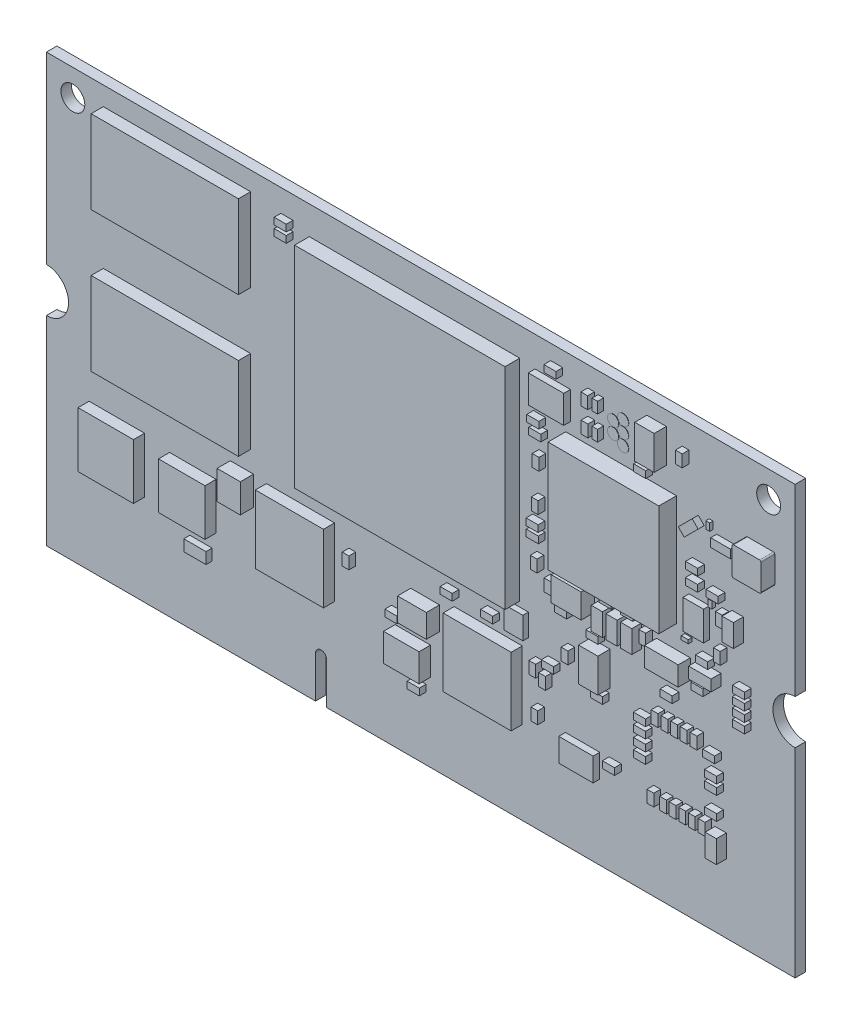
SolidWorks part; units mm, degrees
ref_plane "Front Plane" through (0, 0, 0) normal (0, 0, 1) x (1, 0, 0)
ref_plane "Top Plane" through (0, 0, 0) normal (0, 1, 0) x (1, 0, 0)
ref_plane "Right Plane" through (0, 0, 0) normal (1, 0, 0) x (0, 0, -1)
sketch "Sketch1" plane through (0, 0, 0) normal (0, 0, 1) x (1, 0, 0)
  line L0 (67.6001, 0) -> (25.2999, 0)
  line L1 (25.2999, 0) -> (25.2999, 3.7541)
  line L2 (24.2999, 3.7541) -> (24.2999, 0)
  line L3 (24.2999, 0) -> (0, 0)
  line L4 (0, 0) -> (0, 18)
  line L5 (0, 22) -> (0, 38.5999)
  line L6 (0, 38.5999) -> (67.6001, 38.5999)
  line L7 (67.6001, 38.5999) -> (67.6001, 22)
  line L8 (67.6001, 18) -> (67.6001, 0)
  arc A0 (25.2999, 3.7541) -> (24.8001, 4.254) centre (24.8, 3.754) ccw
  arc A1 (24.8001, 4.254) -> (24.2999, 3.7541) centre (24.7999, 3.754) ccw
  arc A2 (0, 18) -> (2, 20) centre (-0.0002, 20.0002) ccw
  arc A3 (2, 20) -> (0, 22) centre (0, 20) ccw
  arc A4 (67.6001, 22) -> (67.6001, 18) centre (67.6, 20) ccw
extrude "BOARD" add sketch "Sketch1" along normal blind 0.9497 separate body
ref_plane "Plane1" through (0, 0, 0.9497) normal (0, 0, 1) x (1, 0, 0)
sketch "Sketch2" plane through (0, 0, 0.9497) normal (0, 0, 1) x (1, 0, 0)
  line L0 (56.8922, 32.3558) -> (56.8922, 22.3558)
  line L1 (56.8922, 22.3558) -> (46.8922, 22.3558)
  line L2 (46.8922, 22.3558) -> (46.8922, 32.3558)
  line L3 (46.8922, 32.3558) -> (56.8922, 32.3558)
extrude "450-0162R-1" add sketch "Sketch2" along normal blind 1.5999 separate body
sketch "Sketch3" plane through (0, 0, 0.9497) normal (0, 0, 1) x (1, 0, 0)
  line L0 (58.1372, 30.014) -> (57.5984, 30.5528)
  line L1 (57.5984, 30.5528) -> (58.8557, 31.8101)
  line L2 (58.8557, 31.8101) -> (59.3945, 31.2713)
  line L3 (59.3945, 31.2713) -> (58.1372, 30.014)
extrude "C0402_LWB5-1" add sketch "Sketch3" along normal blind 0.5486 separate body
sketch "Sketch4" plane through (0, 0, 0.9497) normal (0, 0, 1) x (1, 0, 0)
  line L0 (59.8785, 22.6017) -> (58.0283, 22.6017)
  line L1 (58.0283, 22.6017) -> (58.0283, 25.2519)
  line L2 (58.0283, 25.2519) -> (59.8785, 25.2519)
  line L3 (59.8785, 25.2519) -> (59.8785, 22.6017)
extrude "UFQFN16_SN74AVC4T774-1" add sketch "Sketch4" along normal blind 0.5499 separate body
sketch "Sketch5" plane through (0, 0, 0.9497) normal (0, 0, 1) x (1, 0, 0)
  line L0 (60.4139, 25.4152) -> (60.0837, 25.4152)
  line L1 (60.0837, 25.4152) -> (60.0837, 26.0452)
  line L2 (60.0837, 26.0452) -> (60.4139, 26.0452)
  line L3 (60.4139, 26.0452) -> (60.4139, 25.4152)
extrude "0201_CC-1" add sketch "Sketch5" along normal blind 0.3299 separate body
sketch "Sketch6" plane through (0, 0, 0.9497) normal (0, 0, 1) x (1, 0, 0)
  line L0 (58.2778, 21.9583) -> (58.2778, 21.6281)
  line L1 (58.2778, 21.6281) -> (57.6478, 21.6281)
  line L2 (57.6478, 21.6281) -> (57.6478, 21.9583)
  line L3 (57.6478, 21.9583) -> (58.2778, 21.9583)
extrude "0201_CC-2" add sketch "Sketch6" along normal blind 0.3299 separate body
sketch "Sketch7" plane through (0, 0, 0.9497) normal (0, 0, 1) x (1, 0, 0)
  line L0 (60.5282, 30.4038) -> (60.5282, 31.1658)
  line L1 (60.5282, 31.1658) -> (62.3062, 31.1658)
  line L2 (62.3062, 31.1658) -> (62.3062, 30.4038)
  line L3 (62.3062, 30.4038) -> (60.5282, 30.4038)
extrude "R0402_LWB5-1" add sketch "Sketch7" along normal blind 0.5499 separate body
sketch "Sketch8" plane through (0, 0, 0.9497) normal (0, 0, 1) x (1, 0, 0)
  line L0 (43.5219, 16.5702) -> (43.5219, 14.5702)
  line L1 (43.5219, 14.5702) -> (41.8221, 14.5702)
  line L2 (41.8221, 14.5702) -> (41.8221, 16.5702)
  line L3 (41.8221, 16.5702) -> (43.5219, 16.5702)
extrude "NTS0104GU12-1" add sketch "Sketch8" along normal blind 0.5001 separate body
sketch "Sketch9" plane through (0, 0, 0.9497) normal (0, 0, 1) x (1, 0, 0)
  line L0 (60.198, 31.369) -> (59.8424, 31.369)
  line L1 (59.8424, 31.369) -> (59.8424, 32.0294)
  line L2 (59.8424, 32.0294) -> (60.198, 32.0294)
  line L3 (60.198, 32.0294) -> (60.198, 31.369)
extrude "C0201_LWB5-1" add sketch "Sketch9" along normal blind 0.3048 separate body
sketch "Sketch10" plane through (0, 0, 0.9497) normal (0, 0, 1) x (1, 0, 0)
  line L0 (50.3169, 35.7233) -> (49.817, 35.7233)
  line L1 (49.817, 35.7233) -> (49.817, 36.7236)
  line L2 (49.817, 36.7236) -> (50.3169, 36.7236)
  line L3 (50.3169, 36.7236) -> (50.3169, 35.7233)
extrude "BLM15PD-1" add sketch "Sketch10" along normal blind 0.5499 separate body
sketch "Sketch11" plane through (0, 0, 0.9497) normal (0, 0, 1) x (1, 0, 0)
  line L0 (49.8099, 34.526) -> (50.3098, 34.526)
  line L1 (50.3098, 34.526) -> (50.3098, 33.5257)
  line L2 (50.3098, 33.5257) -> (49.8099, 33.5257)
  line L3 (49.8099, 33.5257) -> (49.8099, 34.526)
extrude "BLM15PD-2" add sketch "Sketch11" along normal blind 0.5499 separate body
sketch "Sketch12" plane through (0, 0, 0) normal (0, 0, 1) x (1, 0, 0)
  line L0 (4.4592, 9.6182) -> (4.9591, 9.6182)
  line L1 (4.9591, 9.6182) -> (4.9591, 10.6185)
  line L2 (4.9591, 10.6185) -> (4.4592, 10.6185)
  line L3 (4.4592, 10.6185) -> (4.4592, 9.6182)
extrude "BLM15PD-3" add sketch "Sketch12" against normal blind 0.5499 separate body
sketch "Sketch13" plane through (0, 0, 0) normal (0, 0, 1) x (1, 0, 0)
  line L0 (22.3754, 15.7866) -> (22.3754, 16.2865)
  line L1 (22.3754, 16.2865) -> (21.3751, 16.2865)
  line L2 (21.3751, 16.2865) -> (21.3751, 15.7866)
  line L3 (21.3751, 15.7866) -> (22.3754, 15.7866)
extrude "BLM15PD-4" add sketch "Sketch13" against normal blind 0.5499 separate body
sketch "Sketch14" plane through (0, 0, 0) normal (0, 0, 1) x (1, 0, 0)
  line L0 (38.9049, 14.6599) -> (38.9049, 15.1597)
  line L1 (38.9049, 15.1597) -> (37.9047, 15.1597)
  line L2 (37.9047, 15.1597) -> (37.9047, 14.6599)
  line L3 (37.9047, 14.6599) -> (38.9049, 14.6599)
extrude "BLM15PD-5" add sketch "Sketch14" against normal blind 0.5499 separate body
sketch "Sketch15" plane through (0, 0, 0) normal (0, 0, 1) x (1, 0, 0)
  line L0 (17.1153, 9.0091) -> (16.6154, 9.0091)
  line L1 (16.6154, 9.0091) -> (16.6154, 8.0089)
  line L2 (16.6154, 8.0089) -> (17.1153, 8.0089)
  line L3 (17.1153, 8.0089) -> (17.1153, 9.0091)
extrude "BLM15PD-6" add sketch "Sketch15" against normal blind 0.5499 separate body
sketch "Sketch16" plane through (0, 0, 0) normal (0, 0, 1) x (1, 0, 0)
  line L0 (45.6105, 7.3165) -> (45.6105, 7.8163)
  line L1 (45.6105, 7.8163) -> (44.6103, 7.8163)
  line L2 (44.6103, 7.8163) -> (44.6103, 7.3165)
  line L3 (44.6103, 7.3165) -> (45.6105, 7.3165)
extrude "BLM15PD-7" add sketch "Sketch16" against normal blind 0.5499 separate body
sketch "Sketch17" plane through (0, 0, 0.9497) normal (0, 0, 1) x (1, 0, 0)
  line L0 (65.6382, 32.3388) -> (63.2922, 32.3388)
  line L1 (63.1652, 32.2118) -> (63.1652, 29.8658)
  line L2 (63.2922, 29.7388) -> (65.6382, 29.7388)
  line L3 (65.7652, 29.8658) -> (65.7652, 32.2118)
  arc A0 (63.2922, 32.3388) -> (63.1652, 32.2118) centre (63.2922, 32.2118) ccw
  arc A1 (63.1652, 29.8658) -> (63.2922, 29.7388) centre (63.2922, 29.8658) ccw
  arc A2 (65.6382, 29.7388) -> (65.7652, 29.8658) centre (65.6382, 29.8658) ccw
  arc A3 (65.7652, 32.2118) -> (65.6382, 32.3388) centre (65.6382, 32.2118) ccw
extrude "UFL_3PAD-1" add sketch "Sketch17" along normal blind 1.2499 separate body
sketch "Sketch36" plane through (0, 0, 0.9497) normal (0, 0, 1) x (1, 0, 0)
  line L0 (40.9067, 15.24) -> (40.9067, 14.6304)
  line L1 (40.9067, 14.6304) -> (39.8145, 14.6304)
  line L2 (39.8145, 14.6304) -> (39.8145, 15.24)
  line L3 (39.8145, 15.24) -> (40.9067, 15.24)
extrude "C0402-1" add sketch "Sketch36" along normal blind 0.6096 separate body
sketch "Sketch37" plane through (0, 0, 0.9497) normal (0, 0, 1) x (1, 0, 0)
  line L0 (45.0596, 12.9159) -> (45.6692, 12.9159)
  line L1 (45.6692, 12.9159) -> (45.6692, 11.8237)
  line L2 (45.6692, 11.8237) -> (45.0596, 11.8237)
  line L3 (45.0596, 11.8237) -> (45.0596, 12.9159)
extrude "C0402-2" add sketch "Sketch37" along normal blind 0.6096 separate body
sketch "Sketch38" plane through (0, 0, 0) normal (0, 0, 1) x (1, 0, 0)
  line L0 (40.3352, 13.7541) -> (39.7256, 13.7541)
  line L1 (39.7256, 13.7541) -> (39.7256, 12.6619)
  line L2 (39.7256, 12.6619) -> (40.3352, 12.6619)
  line L3 (40.3352, 12.6619) -> (40.3352, 13.7541)
extrude "C0402-3" add sketch "Sketch38" against normal blind 0.6096 separate body
sketch "Sketch39" plane through (0, 0, 0.9497) normal (0, 0, 1) x (1, 0, 0)
  line L0 (47.5869, 18.9738) -> (47.5869, 18.3642)
  line L1 (47.5869, 18.3642) -> (46.4947, 18.3642)
  line L2 (46.4947, 18.3642) -> (46.4947, 18.9738)
  line L3 (46.4947, 18.9738) -> (47.5869, 18.9738)
extrude "C0402-4" add sketch "Sketch39" along normal blind 0.6096 separate body
sketch "Sketch40" plane through (0, 0, 0.9497) normal (0, 0, 1) x (1, 0, 0)
  line L0 (45.3009, 13.4366) -> (45.3009, 14.0462)
  line L1 (45.3009, 14.0462) -> (46.3931, 14.0462)
  line L2 (46.3931, 14.0462) -> (46.3931, 13.4366)
  line L3 (46.3931, 13.4366) -> (45.3009, 13.4366)
extrude "C0402-5" add sketch "Sketch40" along normal blind 0.6096 separate body
sketch "Sketch41" plane through (0, 0, 0.9497) normal (0, 0, 1) x (1, 0, 0)
  line L0 (52.4637, 21.1582) -> (52.4637, 21.7678)
  line L1 (52.4637, 21.7678) -> (53.5559, 21.7678)
  line L2 (53.5559, 21.7678) -> (53.5559, 21.1582)
  line L3 (53.5559, 21.1582) -> (52.4637, 21.1582)
extrude "C0402-6" add sketch "Sketch41" along normal blind 0.6096 separate body
sketch "Sketch42" plane through (0, 0, 0.9497) normal (0, 0, 1) x (1, 0, 0)
  line L0 (51.6001, 21.7424) -> (51.6001, 21.1328)
  line L1 (51.6001, 21.1328) -> (50.5079, 21.1328)
  line L2 (50.5079, 21.1328) -> (50.5079, 21.7424)
  line L3 (50.5079, 21.7424) -> (51.6001, 21.7424)
extrude "C0402-7" add sketch "Sketch42" along normal blind 0.6096 separate body
sketch "Sketch43" plane through (0, 0, 0) normal (0, 0, 1) x (1, 0, 0)
  line L0 (16.8021, 9.6774) -> (16.8021, 10.287)
  line L1 (16.8021, 10.287) -> (15.7099, 10.287)
  line L2 (15.7099, 10.287) -> (15.7099, 9.6774)
  line L3 (15.7099, 9.6774) -> (16.8021, 9.6774)
extrude "C0402-8" add sketch "Sketch43" against normal blind 0.6096 separate body
sketch "Sketch44" plane through (0, 0, 0) normal (0, 0, 1) x (1, 0, 0)
  line L0 (13.9319, 14.9098) -> (13.9319, 14.3002)
  line L1 (13.9319, 14.3002) -> (15.0241, 14.3002)
  line L2 (15.0241, 14.3002) -> (15.0241, 14.9098)
  line L3 (15.0241, 14.9098) -> (13.9319, 14.9098)
extrude "C0402-9" add sketch "Sketch44" against normal blind 0.6096 separate body
sketch "Sketch45" plane through (0, 0, 0) normal (0, 0, 1) x (1, 0, 0)
  line L0 (11.4018, 8.9446) -> (11.4018, 8.335)
  line L1 (11.4018, 8.335) -> (12.494, 8.335)
  line L2 (12.494, 8.335) -> (12.494, 8.9446)
  line L3 (12.494, 8.9446) -> (11.4018, 8.9446)
extrude "C0402-10" add sketch "Sketch45" against normal blind 0.6096 separate body
sketch "Sketch46" plane through (0, 0, 0) normal (0, 0, 1) x (1, 0, 0)
  line L0 (13.5768, 12.8488) -> (12.9672, 12.8488)
  line L1 (12.9672, 12.8488) -> (12.9672, 11.7566)
  line L2 (12.9672, 11.7566) -> (13.5768, 11.7566)
  line L3 (13.5768, 11.7566) -> (13.5768, 12.8488)
extrude "C0402-11" add sketch "Sketch46" against normal blind 0.6096 separate body
sketch "Sketch47" plane through (0, 0, 0) normal (0, 0, 1) x (1, 0, 0)
  line L0 (32.5211, 34.8132) -> (32.5211, 35.4228)
  line L1 (32.5211, 35.4228) -> (31.4289, 35.4228)
  line L2 (31.4289, 35.4228) -> (31.4289, 34.8132)
  line L3 (31.4289, 34.8132) -> (32.5211, 34.8132)
extrude "C0402-12" add sketch "Sketch47" against normal blind 0.6096 separate body
sketch "Sketch48" plane through (0, 0, 0) normal (0, 0, 1) x (1, 0, 0)
  line L0 (60.1345, 33.2323) -> (60.1345, 33.8419)
  line L1 (60.1345, 33.8419) -> (59.0423, 33.8419)
  line L2 (59.0423, 33.8419) -> (59.0423, 33.2323)
  line L3 (59.0423, 33.2323) -> (60.1345, 33.2323)
extrude "C0402-13" add sketch "Sketch48" against normal blind 0.6096 separate body
sketch "Sketch49" plane through (0, 0, 0.9497) normal (0, 0, 1) x (1, 0, 0)
  line L0 (53.6321, 32.9184) -> (53.6321, 33.528)
  line L1 (53.6321, 33.528) -> (54.7243, 33.528)
  line L2 (54.7243, 33.528) -> (54.7243, 32.9184)
  line L3 (54.7243, 32.9184) -> (53.6321, 32.9184)
extrude "C0402-14" add sketch "Sketch49" along normal blind 0.6096 separate body
sketch "Sketch50" plane through (0, 0, 0.9497) normal (0, 0, 1) x (1, 0, 0)
  line L0 (61.0169, 25.6794) -> (61.6265, 25.6794)
  line L1 (61.6265, 25.6794) -> (61.6265, 24.5872)
  line L2 (61.6265, 24.5872) -> (61.0169, 24.5872)
  line L3 (61.0169, 24.5872) -> (61.0169, 25.6794)
extrude "C0402-15" add sketch "Sketch50" along normal blind 0.6096 separate body
sketch "Sketch51" plane through (0, 0, 0.9497) normal (0, 0, 1) x (1, 0, 0)
  line L0 (60.3184, 21.3868) -> (60.3184, 20.7772)
  line L1 (60.3184, 20.7772) -> (59.2262, 20.7772)
  line L2 (59.2262, 20.7772) -> (59.2262, 21.3868)
  line L3 (59.2262, 21.3868) -> (60.3184, 21.3868)
extrude "C0402-16" add sketch "Sketch51" along normal blind 0.6096 separate body
sketch "Sketch52" plane through (0, 0, 0.9497) normal (0, 0, 1) x (1, 0, 0)
  line L0 (60.1726, 26.3713) -> (60.1726, 26.9809)
  line L1 (60.1726, 26.9809) -> (61.2648, 26.9809)
  line L2 (61.2648, 26.9809) -> (61.2648, 26.3713)
  line L3 (61.2648, 26.3713) -> (60.1726, 26.3713)
extrude "C0402-17" add sketch "Sketch52" along normal blind 0.6096 separate body
sketch "Sketch53" plane through (0, 0, 0) normal (0, 0, 1) x (1, 0, 0)
  line L0 (8.0493, 8.0101) -> (8.0493, 8.6197)
  line L1 (8.0493, 8.6197) -> (6.9571, 8.6197)
  line L2 (6.9571, 8.6197) -> (6.9571, 8.0101)
  line L3 (6.9571, 8.0101) -> (8.0493, 8.0101)
extrude "C0402-18" add sketch "Sketch53" against normal blind 0.6096 separate body
sketch "Sketch54" plane through (0, 0, 0) normal (0, 0, 1) x (1, 0, 0)
  line L0 (6.1443, 8.0101) -> (6.1443, 8.6197)
  line L1 (6.1443, 8.6197) -> (5.0521, 8.6197)
  line L2 (5.0521, 8.6197) -> (5.0521, 8.0101)
  line L3 (5.0521, 8.0101) -> (6.1443, 8.0101)
extrude "C0402-19" add sketch "Sketch54" against normal blind 0.6096 separate body
sketch "Sketch55" plane through (0, 0, 0.9497) normal (0, 0, 1) x (1, 0, 0)
  line L0 (53.6067, 11.5153) -> (53.6067, 12.1249)
  line L1 (53.6067, 12.1249) -> (54.6989, 12.1249)
  line L2 (54.6989, 12.1249) -> (54.6989, 11.5153)
  line L3 (54.6989, 11.5153) -> (53.6067, 11.5153)
extrude "C0402-20" add sketch "Sketch55" along normal blind 0.6096 separate body
sketch "Sketch56" plane through (0, 0, 0) normal (0, 0, 1) x (1, 0, 0)
  line L0 (4.1504, 10.6644) -> (3.5408, 10.6644)
  line L1 (3.5408, 10.6644) -> (3.5408, 9.5722)
  line L2 (3.5408, 9.5722) -> (4.1504, 9.5722)
  line L3 (4.1504, 9.5722) -> (4.1504, 10.6644)
extrude "C0402-21" add sketch "Sketch56" against normal blind 0.6096 separate body
sketch "Sketch57" plane through (0, 0, 0) normal (0, 0, 1) x (1, 0, 0)
  line L0 (7.1476, 13.3822) -> (6.538, 13.3822)
  line L1 (6.538, 13.3822) -> (6.538, 12.29)
  line L2 (6.538, 12.29) -> (7.1476, 12.29)
  line L3 (7.1476, 12.29) -> (7.1476, 13.3822)
extrude "C0402-22" add sketch "Sketch57" against normal blind 0.6096 separate body
sketch "Sketch58" plane through (0, 0, 0) normal (0, 0, 1) x (1, 0, 0)
  line L0 (6.1316, 13.3822) -> (5.522, 13.3822)
  line L1 (5.522, 13.3822) -> (5.522, 12.29)
  line L2 (5.522, 12.29) -> (6.1316, 12.29)
  line L3 (6.1316, 12.29) -> (6.1316, 13.3822)
extrude "C0402-23" add sketch "Sketch58" against normal blind 0.6096 separate body
sketch "Sketch59" plane through (0, 0, 0) normal (0, 0, 1) x (1, 0, 0)
  line L0 (36.7022, 11.6931) -> (36.7022, 11.0835)
  line L1 (36.7022, 11.0835) -> (37.7944, 11.0835)
  line L2 (37.7944, 11.0835) -> (37.7944, 11.6931)
  line L3 (37.7944, 11.6931) -> (36.7022, 11.6931)
extrude "C0402-24" add sketch "Sketch59" against normal blind 0.6096 separate body
sketch "Sketch60" plane through (0, 0, 0) normal (0, 0, 1) x (1, 0, 0)
  line L0 (36.6768, 10.4739) -> (36.6768, 9.8643)
  line L1 (36.6768, 9.8643) -> (37.769, 9.8643)
  line L2 (37.769, 9.8643) -> (37.769, 10.4739)
  line L3 (37.769, 10.4739) -> (36.6768, 10.4739)
extrude "C0402-25" add sketch "Sketch60" against normal blind 0.6096 separate body
sketch "Sketch61" plane through (0, 0, 0) normal (0, 0, 1) x (1, 0, 0)
  line L0 (37.6293, 7.2862) -> (38.2389, 7.2862)
  line L1 (38.2389, 7.2862) -> (38.2389, 8.3784)
  line L2 (38.2389, 8.3784) -> (37.6293, 8.3784)
  line L3 (37.6293, 8.3784) -> (37.6293, 7.2862)
extrude "C0402-26" add sketch "Sketch61" against normal blind 0.6096 separate body
sketch "Sketch62" plane through (0, 0, 0) normal (0, 0, 1) x (1, 0, 0)
  line L0 (40.2963, 7.2862) -> (40.9059, 7.2862)
  line L1 (40.9059, 7.2862) -> (40.9059, 8.3784)
  line L2 (40.9059, 8.3784) -> (40.2963, 8.3784)
  line L3 (40.2963, 8.3784) -> (40.2963, 7.2862)
extrude "C0402-27" add sketch "Sketch62" against normal blind 0.6096 separate body
sketch "Sketch63" plane through (0, 0, 0) normal (0, 0, 1) x (1, 0, 0)
  line L0 (39.4073, 7.2862) -> (40.0169, 7.2862)
  line L1 (40.0169, 7.2862) -> (40.0169, 8.3784)
  line L2 (40.0169, 8.3784) -> (39.4073, 8.3784)
  line L3 (39.4073, 8.3784) -> (39.4073, 7.2862)
extrude "C0402-28" add sketch "Sketch63" against normal blind 0.6096 separate body
sketch "Sketch64" plane through (0, 0, 0) normal (0, 0, 1) x (1, 0, 0)
  line L0 (39.4462, 13.7541) -> (38.8366, 13.7541)
  line L1 (38.8366, 13.7541) -> (38.8366, 12.6619)
  line L2 (38.8366, 12.6619) -> (39.4462, 12.6619)
  line L3 (39.4462, 12.6619) -> (39.4462, 13.7541)
extrude "C0402-29" add sketch "Sketch64" against normal blind 0.6096 separate body
sketch "Sketch65" plane through (0, 0, 0.9497) normal (0, 0, 1) x (1, 0, 0)
  line L0 (44.3603, 9.877) -> (44.9699, 9.877)
  line L1 (44.9699, 9.877) -> (44.9699, 8.7848)
  line L2 (44.9699, 8.7848) -> (44.3603, 8.7848)
  line L3 (44.3603, 8.7848) -> (44.3603, 9.877)
extrude "C0402-30" add sketch "Sketch65" along normal blind 0.6096 separate body
sketch "Sketch66" plane through (0, 0, 0) normal (0, 0, 1) x (1, 0, 0)
  line L0 (38.5572, 13.7541) -> (37.9476, 13.7541)
  line L1 (37.9476, 13.7541) -> (37.9476, 12.6619)
  line L2 (37.9476, 12.6619) -> (38.5572, 12.6619)
  line L3 (38.5572, 12.6619) -> (38.5572, 13.7541)
extrude "C0402-31" add sketch "Sketch66" against normal blind 0.6096 separate body
sketch "Sketch67" plane through (0, 0, 0.9497) normal (0, 0, 1) x (1, 0, 0)
  line L0 (61.1251, 12.8361) -> (61.1251, 12.2265)
  line L1 (61.1251, 12.2265) -> (60.0329, 12.2265)
  line L2 (60.0329, 12.2265) -> (60.0329, 12.8361)
  line L3 (60.0329, 12.8361) -> (61.1251, 12.8361)
extrude "C0402-32" add sketch "Sketch67" along normal blind 0.6096 separate body
sketch "Sketch68" plane through (0, 0, 0) normal (0, 0, 1) x (1, 0, 0)
  line L0 (22.6626, 14.9062) -> (22.053, 14.9062)
  line L1 (22.053, 14.9062) -> (22.053, 13.814)
  line L2 (22.053, 13.814) -> (22.6626, 13.814)
  line L3 (22.6626, 13.814) -> (22.6626, 14.9062)
extrude "C0402-33" add sketch "Sketch68" against normal blind 0.6096 separate body
sketch "Sketch69" plane through (0, 0, 0) normal (0, 0, 1) x (1, 0, 0)
  line L0 (20.6814, 8.4292) -> (21.291, 8.4292)
  line L1 (21.291, 8.4292) -> (21.291, 9.5214)
  line L2 (21.291, 9.5214) -> (20.6814, 9.5214)
  line L3 (20.6814, 9.5214) -> (20.6814, 8.4292)
extrude "C0402-34" add sketch "Sketch69" against normal blind 0.6096 separate body
sketch "Sketch70" plane through (0, 0, 0) normal (0, 0, 1) x (1, 0, 0)
  line L0 (23.3484, 8.4292) -> (23.958, 8.4292)
  line L1 (23.958, 8.4292) -> (23.958, 9.5214)
  line L2 (23.958, 9.5214) -> (23.3484, 9.5214)
  line L3 (23.3484, 9.5214) -> (23.3484, 8.4292)
extrude "C0402-35" add sketch "Sketch70" against normal blind 0.6096 separate body
sketch "Sketch71" plane through (0, 0, 0) normal (0, 0, 1) x (1, 0, 0)
  line L0 (19.7289, 11.6169) -> (19.7289, 11.0073)
  line L1 (19.7289, 11.0073) -> (20.8211, 11.0073)
  line L2 (20.8211, 11.0073) -> (20.8211, 11.6169)
  line L3 (20.8211, 11.6169) -> (19.7289, 11.6169)
extrude "C0402-36" add sketch "Sketch71" against normal blind 0.6096 separate body
sketch "Sketch72" plane through (0, 0, 0) normal (0, 0, 1) x (1, 0, 0)
  line L0 (19.7543, 12.8361) -> (19.7543, 12.2265)
  line L1 (19.7543, 12.2265) -> (20.8465, 12.2265)
  line L2 (20.8465, 12.2265) -> (20.8465, 12.8361)
  line L3 (20.8465, 12.8361) -> (19.7543, 12.8361)
extrude "C0402-37" add sketch "Sketch72" against normal blind 0.6096 separate body
sketch "Sketch73" plane through (0, 0, 0.9497) normal (0, 0, 1) x (1, 0, 0)
  line L0 (53.6067, 12.5313) -> (53.6067, 13.1409)
  line L1 (53.6067, 13.1409) -> (54.6989, 13.1409)
  line L2 (54.6989, 13.1409) -> (54.6989, 12.5313)
  line L3 (54.6989, 12.5313) -> (53.6067, 12.5313)
extrude "C0402-38" add sketch "Sketch73" along normal blind 0.6096 separate body
sketch "Sketch74" plane through (0, 0, 0) normal (0, 0, 1) x (1, 0, 0)
  line L0 (22.4594, 8.4292) -> (23.069, 8.4292)
  line L1 (23.069, 8.4292) -> (23.069, 9.5214)
  line L2 (23.069, 9.5214) -> (22.4594, 9.5214)
  line L3 (22.4594, 9.5214) -> (22.4594, 8.4292)
extrude "C0402-39" add sketch "Sketch74" against normal blind 0.6096 separate body
sketch "Sketch75" plane through (0, 0, 0) normal (0, 0, 1) x (1, 0, 0)
  line L0 (26.1493, 10.6517) -> (26.1493, 11.2613)
  line L1 (26.1493, 11.2613) -> (25.0571, 11.2613)
  line L2 (25.0571, 11.2613) -> (25.0571, 10.6517)
  line L3 (25.0571, 10.6517) -> (26.1493, 10.6517)
extrude "C0402-40" add sketch "Sketch75" against normal blind 0.6096 separate body
sketch "Sketch76" plane through (0, 0, 0) normal (0, 0, 1) x (1, 0, 0)
  line L0 (21.7736, 14.9062) -> (21.164, 14.9062)
  line L1 (21.164, 14.9062) -> (21.164, 13.814)
  line L2 (21.164, 13.814) -> (21.7736, 13.814)
  line L3 (21.7736, 13.814) -> (21.7736, 14.9062)
extrude "C0402-41" add sketch "Sketch76" against normal blind 0.6096 separate body
sketch "Sketch77" plane through (0, 0, 0.9497) normal (0, 0, 1) x (1, 0, 0)
  line L0 (59.182, 7.6164) -> (58.5724, 7.6164)
  line L1 (58.5724, 7.6164) -> (58.5724, 8.7086)
  line L2 (58.5724, 8.7086) -> (59.182, 8.7086)
  line L3 (59.182, 8.7086) -> (59.182, 7.6164)
extrude "C0402-42" add sketch "Sketch77" along normal blind 0.6096 separate body
sketch "Sketch78" plane through (0, 0, 0.9497) normal (0, 0, 1) x (1, 0, 0)
  line L0 (56.9722, 15.084) -> (57.5818, 15.084)
  line L1 (57.5818, 15.084) -> (57.5818, 13.9918)
  line L2 (57.5818, 13.9918) -> (56.9722, 13.9918)
  line L3 (56.9722, 13.9918) -> (56.9722, 15.084)
extrude "C0402-43" add sketch "Sketch78" along normal blind 0.6096 separate body
sketch "Sketch79" plane through (0, 0, 0) normal (0, 0, 1) x (1, 0, 0)
  line L0 (61.5569, 15.9857) -> (61.5569, 16.5953)
  line L1 (61.5569, 16.5953) -> (60.4647, 16.5953)
  line L2 (60.4647, 16.5953) -> (60.4647, 15.9857)
  line L3 (60.4647, 15.9857) -> (61.5569, 15.9857)
extrude "C0402-44" add sketch "Sketch79" against normal blind 0.6096 separate body
sketch "Sketch80" plane through (0, 0, 0.9497) normal (0, 0, 1) x (1, 0, 0)
  line L0 (55.4482, 7.591) -> (54.8386, 7.591)
  line L1 (54.8386, 7.591) -> (54.8386, 8.6832)
  line L2 (54.8386, 8.6832) -> (55.4482, 8.6832)
  line L3 (55.4482, 8.6832) -> (55.4482, 7.591)
extrude "C0402-45" add sketch "Sketch80" along normal blind 0.6096 separate body
sketch "Sketch81" plane through (0, 0, 0) normal (0, 0, 1) x (1, 0, 0)
  line L0 (60.4647, 17.5351) -> (60.4647, 16.9255)
  line L1 (60.4647, 16.9255) -> (61.5569, 16.9255)
  line L2 (61.5569, 16.9255) -> (61.5569, 17.5351)
  line L3 (61.5569, 17.5351) -> (60.4647, 17.5351)
extrude "C0402-46" add sketch "Sketch81" against normal blind 0.6096 separate body
sketch "Sketch82" plane through (0, 0, 0) normal (0, 0, 1) x (1, 0, 0)
  line L0 (62.2935, 8.6705) -> (62.2935, 8.0609)
  line L1 (62.2935, 8.0609) -> (63.3857, 8.0609)
  line L2 (63.3857, 8.0609) -> (63.3857, 8.6705)
  line L3 (63.3857, 8.6705) -> (62.2935, 8.6705)
extrude "C0402-47" add sketch "Sketch82" against normal blind 0.6096 separate body
sketch "Sketch83" plane through (0, 0, 0) normal (0, 0, 1) x (1, 0, 0)
  line L0 (12.2845, 37.0126) -> (12.2845, 37.6222)
  line L1 (12.2845, 37.6222) -> (11.1923, 37.6222)
  line L2 (11.1923, 37.6222) -> (11.1923, 37.0126)
  line L3 (11.1923, 37.0126) -> (12.2845, 37.0126)
extrude "C0402-48" add sketch "Sketch83" against normal blind 0.6096 separate body
sketch "Sketch84" plane through (0, 0, 0) normal (0, 0, 1) x (1, 0, 0)
  line L0 (14.5197, 24.4378) -> (14.5197, 25.0474)
  line L1 (14.5197, 25.0474) -> (13.4275, 25.0474)
  line L2 (13.4275, 25.0474) -> (13.4275, 24.4378)
  line L3 (13.4275, 24.4378) -> (14.5197, 24.4378)
extrude "C0402-49" add sketch "Sketch84" against normal blind 0.6096 separate body
sketch "Sketch85" plane through (0, 0, 0.9497) normal (0, 0, 1) x (1, 0, 0)
  line L0 (61.1251, 11.9471) -> (61.1251, 11.3375)
  line L1 (61.1251, 11.3375) -> (60.0329, 11.3375)
  line L2 (60.0329, 11.3375) -> (60.0329, 11.9471)
  line L3 (60.0329, 11.9471) -> (61.1251, 11.9471)
extrude "C0402-50" add sketch "Sketch85" along normal blind 0.6096 separate body
sketch "Sketch86" plane through (0, 0, 0.9497) normal (0, 0, 1) x (1, 0, 0)
  line L0 (61.1251, 9.9151) -> (61.1251, 9.3055)
  line L1 (61.1251, 9.3055) -> (60.0329, 9.3055)
  line L2 (60.0329, 9.3055) -> (60.0329, 9.9151)
  line L3 (60.0329, 9.9151) -> (61.1251, 9.9151)
extrude "C0402-51" add sketch "Sketch86" along normal blind 0.6096 separate body
sketch "Sketch87" plane through (0, 0, 0.9497) normal (0, 0, 1) x (1, 0, 0)
  line L0 (60.9473, 14.3347) -> (60.9473, 13.7251)
  line L1 (60.9473, 13.7251) -> (59.8551, 13.7251)
  line L2 (59.8551, 13.7251) -> (59.8551, 14.3347)
  line L3 (59.8551, 14.3347) -> (60.9473, 14.3347)
extrude "C0402-52" add sketch "Sketch87" along normal blind 0.6096 separate body
sketch "Sketch88" plane through (0, 0, 0) normal (0, 0, 1) x (1, 0, 0)
  line L0 (58.9026, 16.227) -> (59.5122, 16.227)
  line L1 (59.5122, 16.227) -> (59.5122, 17.3192)
  line L2 (59.5122, 17.3192) -> (58.9026, 17.3192)
  line L3 (58.9026, 17.3192) -> (58.9026, 16.227)
extrude "C0402-53" add sketch "Sketch88" against normal blind 0.6096 separate body
sketch "Sketch89" plane through (0, 0, 0) normal (0, 0, 1) x (1, 0, 0)
  line L0 (24.7305, 20.6786) -> (24.7305, 21.2882)
  line L1 (24.7305, 21.2882) -> (23.6383, 21.2882)
  line L2 (23.6383, 21.2882) -> (23.6383, 20.6786)
  line L3 (23.6383, 20.6786) -> (24.7305, 20.6786)
extrude "C0402-54" add sketch "Sketch89" against normal blind 0.6096 separate body
sketch "Sketch90" plane through (0, 0, 0) normal (0, 0, 1) x (1, 0, 0)
  line L0 (34.1158, 32.7563) -> (34.7254, 32.7563)
  line L1 (34.7254, 32.7563) -> (34.7254, 33.8485)
  line L2 (34.7254, 33.8485) -> (34.1158, 33.8485)
  line L3 (34.1158, 33.8485) -> (34.1158, 32.7563)
extrude "C0402-55" add sketch "Sketch90" against normal blind 0.6096 separate body
sketch "Sketch91" plane through (0, 0, 0.9497) normal (0, 0, 1) x (1, 0, 0)
  line L0 (53.6067, 13.4965) -> (53.6067, 14.1061)
  line L1 (53.6067, 14.1061) -> (54.6989, 14.1061)
  line L2 (54.6989, 14.1061) -> (54.6989, 13.4965)
  line L3 (54.6989, 13.4965) -> (53.6067, 13.4965)
extrude "C0402-56" add sketch "Sketch91" along normal blind 0.6096 separate body
sketch "Sketch92" plane through (0, 0, 0) normal (0, 0, 1) x (1, 0, 0)
  line L0 (30.1295, 29.4853) -> (30.7391, 29.4853)
  line L1 (30.7391, 29.4853) -> (30.7391, 30.5775)
  line L2 (30.7391, 30.5775) -> (30.1295, 30.5775)
  line L3 (30.1295, 30.5775) -> (30.1295, 29.4853)
extrude "C0402-57" add sketch "Sketch92" against normal blind 0.6096 separate body
sketch "Sketch93" plane through (0, 0, 0) normal (0, 0, 1) x (1, 0, 0)
  line L0 (36.1732, 32.7817) -> (36.7828, 32.7817)
  line L1 (36.7828, 32.7817) -> (36.7828, 33.8739)
  line L2 (36.7828, 33.8739) -> (36.1732, 33.8739)
  line L3 (36.1732, 33.8739) -> (36.1732, 32.7817)
extrude "C0402-58" add sketch "Sketch93" against normal blind 0.6096 separate body
sketch "Sketch94" plane through (0, 0, 0) normal (0, 0, 1) x (1, 0, 0)
  line L0 (57.7215, 6.7401) -> (57.7215, 6.1305)
  line L1 (57.7215, 6.1305) -> (58.8137, 6.1305)
  line L2 (58.8137, 6.1305) -> (58.8137, 6.7401)
  line L3 (58.8137, 6.7401) -> (57.7215, 6.7401)
extrude "C0402-59" add sketch "Sketch94" against normal blind 0.6096 separate body
sketch "Sketch95" plane through (0, 0, 0.9497) normal (0, 0, 1) x (1, 0, 0)
  line L0 (56.5912, 7.6164) -> (55.9816, 7.6164)
  line L1 (55.9816, 7.6164) -> (55.9816, 8.7086)
  line L2 (55.9816, 8.7086) -> (56.5912, 8.7086)
  line L3 (56.5912, 8.7086) -> (56.5912, 7.6164)
extrude "C0402-60" add sketch "Sketch95" along normal blind 0.6096 separate body
sketch "Sketch96" plane through (0, 0, 0) normal (0, 0, 1) x (1, 0, 0)
  line L0 (16.4501, 29.1876) -> (16.4501, 28.578)
  line L1 (16.4501, 28.578) -> (17.5423, 28.578)
  line L2 (17.5423, 28.578) -> (17.5423, 29.1876)
  line L3 (17.5423, 29.1876) -> (16.4501, 29.1876)
extrude "C0402-61" add sketch "Sketch96" against normal blind 0.6096 separate body
sketch "Sketch97" plane through (0, 0, 0) normal (0, 0, 1) x (1, 0, 0)
  line L0 (12.2845, 24.4378) -> (12.2845, 25.0474)
  line L1 (12.2845, 25.0474) -> (11.1923, 25.0474)
  line L2 (11.1923, 25.0474) -> (11.1923, 24.4378)
  line L3 (11.1923, 24.4378) -> (12.2845, 24.4378)
extrude "C0402-62" add sketch "Sketch97" against normal blind 0.6096 separate body
sketch "Sketch98" plane through (0, 0, 0) normal (0, 0, 1) x (1, 0, 0)
  line L0 (32.973, 29.2542) -> (32.3634, 29.2542)
  line L1 (32.3634, 29.2542) -> (32.3634, 28.162)
  line L2 (32.3634, 28.162) -> (32.973, 28.162)
  line L3 (32.973, 28.162) -> (32.973, 29.2542)
extrude "C0402-63" add sketch "Sketch98" against normal blind 0.6096 separate body
sketch "Sketch99" plane through (0, 0, 0) normal (0, 0, 1) x (1, 0, 0)
  line L0 (30.2804, 23.6885) -> (30.89, 23.6885)
  line L1 (30.89, 23.6885) -> (30.89, 24.7807)
  line L2 (30.89, 24.7807) -> (30.2804, 24.7807)
  line L3 (30.2804, 24.7807) -> (30.2804, 23.6885)
extrude "C0402-64" add sketch "Sketch99" against normal blind 0.6096 separate body
sketch "Sketch100" plane through (0, 0, 0) normal (0, 0, 1) x (1, 0, 0)
  line L0 (57.8866, 16.227) -> (58.4962, 16.227)
  line L1 (58.4962, 16.227) -> (58.4962, 17.3192)
  line L2 (58.4962, 17.3192) -> (57.8866, 17.3192)
  line L3 (57.8866, 17.3192) -> (57.8866, 16.227)
extrude "C0402-65" add sketch "Sketch100" against normal blind 0.6096 separate body
sketch "Sketch101" plane through (0, 0, 0) normal (0, 0, 1) x (1, 0, 0)
  line L0 (6.6965, 37.0634) -> (6.6965, 37.673)
  line L1 (6.6965, 37.673) -> (5.6043, 37.673)
  line L2 (5.6043, 37.673) -> (5.6043, 37.0634)
  line L3 (5.6043, 37.0634) -> (6.6965, 37.0634)
extrude "C0402-66" add sketch "Sketch101" against normal blind 0.6096 separate body
sketch "Sketch102" plane through (0, 0, 0) normal (0, 0, 1) x (1, 0, 0)
  line L0 (16.4247, 22.2026) -> (16.4247, 21.593)
  line L1 (16.4247, 21.593) -> (17.5169, 21.593)
  line L2 (17.5169, 21.593) -> (17.5169, 22.2026)
  line L3 (17.5169, 22.2026) -> (16.4247, 22.2026)
extrude "C0402-67" add sketch "Sketch102" against normal blind 0.6096 separate body
sketch "Sketch103" plane through (0, 0, 0.9497) normal (0, 0, 1) x (1, 0, 0)
  line L0 (53.6067, 10.5501) -> (53.6067, 11.1597)
  line L1 (53.6067, 11.1597) -> (54.6989, 11.1597)
  line L2 (54.6989, 11.1597) -> (54.6989, 10.5501)
  line L3 (54.6989, 10.5501) -> (53.6067, 10.5501)
extrude "C0402-68" add sketch "Sketch103" along normal blind 0.6096 separate body
sketch "Sketch104" plane through (0, 0, 0) normal (0, 0, 1) x (1, 0, 0)
  line L0 (12.1448, 36.3377) -> (11.5352, 36.3377)
  line L1 (11.5352, 36.3377) -> (11.5352, 35.2455)
  line L2 (11.5352, 35.2455) -> (12.1448, 35.2455)
  line L3 (12.1448, 35.2455) -> (12.1448, 36.3377)
extrude "C0402-69" add sketch "Sketch104" against normal blind 0.6096 separate body
sketch "Sketch105" plane through (0, 0, 0) normal (0, 0, 1) x (1, 0, 0)
  line L0 (14.5197, 37.0126) -> (14.5197, 37.6222)
  line L1 (14.5197, 37.6222) -> (13.4275, 37.6222)
  line L2 (13.4275, 37.6222) -> (13.4275, 37.0126)
  line L3 (13.4275, 37.0126) -> (14.5197, 37.0126)
extrude "C0402-70" add sketch "Sketch105" against normal blind 0.6096 separate body
sketch "Sketch106" plane through (0, 0, 0.9497) normal (0, 0, 1) x (1, 0, 0)
  line L0 (56.1086, 15.084) -> (56.7182, 15.084)
  line L1 (56.7182, 15.084) -> (56.7182, 13.9918)
  line L2 (56.7182, 13.9918) -> (56.1086, 13.9918)
  line L3 (56.1086, 13.9918) -> (56.1086, 15.084)
extrude "C0402-71" add sketch "Sketch106" along normal blind 0.6096 separate body
sketch "Sketch107" plane through (0, 0, 0.9497) normal (0, 0, 1) x (1, 0, 0)
  line L0 (58.7248, 15.084) -> (59.3344, 15.084)
  line L1 (59.3344, 15.084) -> (59.3344, 13.9918)
  line L2 (59.3344, 13.9918) -> (58.7248, 13.9918)
  line L3 (58.7248, 13.9918) -> (58.7248, 15.084)
extrude "C0402-72" add sketch "Sketch107" along normal blind 0.6096 separate body
sketch "Sketch108" plane through (0, 0, 0) normal (0, 0, 1) x (1, 0, 0)
  line L0 (16.3485, 24.4378) -> (16.3485, 25.0474)
  line L1 (16.3485, 25.0474) -> (15.2563, 25.0474)
  line L2 (15.2563, 25.0474) -> (15.2563, 24.4378)
  line L3 (15.2563, 24.4378) -> (16.3485, 24.4378)
extrude "C0402-73" add sketch "Sketch108" against normal blind 0.6096 separate body
sketch "Sketch109" plane through (0, 0, 0) normal (0, 0, 1) x (1, 0, 0)
  line L0 (60.1345, 34.0959) -> (60.1345, 34.7055)
  line L1 (60.1345, 34.7055) -> (59.0423, 34.7055)
  line L2 (59.0423, 34.7055) -> (59.0423, 34.0959)
  line L3 (59.0423, 34.0959) -> (60.1345, 34.0959)
extrude "C0402-74" add sketch "Sketch109" against normal blind 0.6096 separate body
sketch "Sketch110" plane through (0, 0, 0) normal (0, 0, 1) x (1, 0, 0)
  line L0 (65.2018, 25.2694) -> (65.8114, 25.2694)
  line L1 (65.8114, 25.2694) -> (65.8114, 26.3616)
  line L2 (65.8114, 26.3616) -> (65.2018, 26.3616)
  line L3 (65.2018, 26.3616) -> (65.2018, 25.2694)
extrude "C0402-75" add sketch "Sketch110" against normal blind 0.6096 separate body
sketch "Sketch111" plane through (0, 0, 0) normal (0, 0, 1) x (1, 0, 0)
  line L0 (10.2743, 36.3311) -> (10.2743, 36.9407)
  line L1 (10.2743, 36.9407) -> (9.1821, 36.9407)
  line L2 (9.1821, 36.9407) -> (9.1821, 36.3311)
  line L3 (9.1821, 36.3311) -> (10.2743, 36.3311)
extrude "C0402-76" add sketch "Sketch111" against normal blind 0.6096 separate body
sketch "Sketch112" plane through (0, 0, 0) normal (0, 0, 1) x (1, 0, 0)
  line L0 (12.7671, 32.0832) -> (12.7671, 31.4736)
  line L1 (12.7671, 31.4736) -> (13.8593, 31.4736)
  line L2 (13.8593, 31.4736) -> (13.8593, 32.0832)
  line L3 (13.8593, 32.0832) -> (12.7671, 32.0832)
extrude "C0402-77" add sketch "Sketch112" against normal blind 0.6096 separate body
sketch "Sketch113" plane through (0, 0, 0) normal (0, 0, 1) x (1, 0, 0)
  line L0 (16.3485, 37.0126) -> (16.3485, 37.6222)
  line L1 (16.3485, 37.6222) -> (15.2563, 37.6222)
  line L2 (15.2563, 37.6222) -> (15.2563, 37.0126)
  line L3 (15.2563, 37.0126) -> (16.3485, 37.0126)
extrude "C0402-78" add sketch "Sketch113" against normal blind 0.6096 separate body
sketch "Sketch114" plane through (0, 0, 0) normal (0, 0, 1) x (1, 0, 0)
  line L0 (10.8621, 30.0512) -> (10.8621, 29.4416)
  line L1 (10.8621, 29.4416) -> (11.9543, 29.4416)
  line L2 (11.9543, 29.4416) -> (11.9543, 30.0512)
  line L3 (11.9543, 30.0512) -> (10.8621, 30.0512)
extrude "C0402-79" add sketch "Sketch114" against normal blind 0.6096 separate body
sketch "Sketch115" plane through (0, 0, 0) normal (0, 0, 1) x (1, 0, 0)
  line L0 (13.7323, 18.8244) -> (13.7323, 19.434)
  line L1 (13.7323, 19.434) -> (12.6401, 19.434)
  line L2 (12.6401, 19.434) -> (12.6401, 18.8244)
  line L3 (12.6401, 18.8244) -> (13.7323, 18.8244)
extrude "C0402-80" add sketch "Sketch115" against normal blind 0.6096 separate body
sketch "Sketch116" plane through (0, 0, 0) normal (0, 0, 1) x (1, 0, 0)
  line L0 (10.8621, 17.402) -> (10.8621, 16.7924)
  line L1 (10.8621, 16.7924) -> (11.9543, 16.7924)
  line L2 (11.9543, 16.7924) -> (11.9543, 17.402)
  line L3 (11.9543, 17.402) -> (10.8621, 17.402)
extrude "C0402-81" add sketch "Sketch116" against normal blind 0.6096 separate body
sketch "Sketch117" plane through (0, 0, 0) normal (0, 0, 1) x (1, 0, 0)
  line L0 (16.4501, 16.5384) -> (16.4501, 15.9288)
  line L1 (16.4501, 15.9288) -> (17.5423, 15.9288)
  line L2 (17.5423, 15.9288) -> (17.5423, 16.5384)
  line L3 (17.5423, 16.5384) -> (16.4501, 16.5384)
extrude "C0402-82" add sketch "Sketch117" against normal blind 0.6096 separate body
sketch "Sketch118" plane through (0, 0, 0) normal (0, 0, 1) x (1, 0, 0)
  line L0 (12.1448, 23.6885) -> (11.5352, 23.6885)
  line L1 (11.5352, 23.6885) -> (11.5352, 22.5963)
  line L2 (11.5352, 22.5963) -> (12.1448, 22.5963)
  line L3 (12.1448, 22.5963) -> (12.1448, 23.6885)
extrude "C0402-83" add sketch "Sketch118" against normal blind 0.6096 separate body
sketch "Sketch119" plane through (0, 0, 0) normal (0, 0, 1) x (1, 0, 0)
  line L0 (8.3475, 28.6034) -> (8.3475, 29.213)
  line L1 (8.3475, 29.213) -> (7.2553, 29.213)
  line L2 (7.2553, 29.213) -> (7.2553, 28.6034)
  line L3 (7.2553, 28.6034) -> (8.3475, 28.6034)
extrude "C0402-84" add sketch "Sketch119" against normal blind 0.6096 separate body
sketch "Sketch120" plane through (0, 0, 0) normal (0, 0, 1) x (1, 0, 0)
  line L0 (12.2845, 29.1876) -> (12.2845, 28.578)
  line L1 (12.2845, 28.578) -> (13.3767, 28.578)
  line L2 (13.3767, 28.578) -> (13.3767, 29.1876)
  line L3 (13.3767, 29.1876) -> (12.2845, 29.1876)
extrude "C0402-85" add sketch "Sketch120" against normal blind 0.6096 separate body
sketch "Sketch121" plane through (0, 0, 0) normal (0, 0, 1) x (1, 0, 0)
  line L0 (6.2647, 28.6034) -> (6.2647, 29.213)
  line L1 (6.2647, 29.213) -> (5.1725, 29.213)
  line L2 (5.1725, 29.213) -> (5.1725, 28.6034)
  line L3 (5.1725, 28.6034) -> (6.2647, 28.6034)
extrude "C0402-86" add sketch "Sketch121" against normal blind 0.6096 separate body
sketch "Sketch122" plane through (0, 0, 0.9497) normal (0, 0, 1) x (1, 0, 0)
  line L0 (57.8358, 15.084) -> (58.4454, 15.084)
  line L1 (58.4454, 15.084) -> (58.4454, 13.9918)
  line L2 (58.4454, 13.9918) -> (57.8358, 13.9918)
  line L3 (57.8358, 13.9918) -> (57.8358, 15.084)
extrude "C0402-87" add sketch "Sketch122" along normal blind 0.6096 separate body
sketch "Sketch123" plane through (0, 0, 0) normal (0, 0, 1) x (1, 0, 0)
  line L0 (8.5507, 24.4124) -> (8.5507, 25.022)
  line L1 (8.5507, 25.022) -> (7.4585, 25.022)
  line L2 (7.4585, 25.022) -> (7.4585, 24.4124)
  line L3 (7.4585, 24.4124) -> (8.5507, 24.4124)
extrude "C0402-88" add sketch "Sketch123" against normal blind 0.6096 separate body
sketch "Sketch124" plane through (0, 0, 0) normal (0, 0, 1) x (1, 0, 0)
  line L0 (6.2647, 15.9542) -> (6.2647, 16.5638)
  line L1 (6.2647, 16.5638) -> (5.1725, 16.5638)
  line L2 (5.1725, 16.5638) -> (5.1725, 15.9542)
  line L3 (5.1725, 15.9542) -> (6.2647, 15.9542)
extrude "C0402-89" add sketch "Sketch124" against normal blind 0.6096 separate body
sketch "Sketch125" plane through (0, 0, 0) normal (0, 0, 1) x (1, 0, 0)
  line L0 (10.4328, 24.4475) -> (10.4328, 25.0571)
  line L1 (10.4328, 25.0571) -> (9.3406, 25.0571)
  line L2 (9.3406, 25.0571) -> (9.3406, 24.4475)
  line L3 (9.3406, 24.4475) -> (10.4328, 24.4475)
extrude "C0402-90" add sketch "Sketch125" against normal blind 0.6096 separate body
sketch "Sketch126" plane through (0, 0, 0) normal (0, 0, 1) x (1, 0, 0)
  line L0 (36.4617, 25.9662) -> (36.4617, 26.5758)
  line L1 (36.4617, 26.5758) -> (35.3695, 26.5758)
  line L2 (35.3695, 26.5758) -> (35.3695, 25.9662)
  line L3 (35.3695, 25.9662) -> (36.4617, 25.9662)
extrude "C0402-91" add sketch "Sketch126" against normal blind 0.6096 separate body
sketch "Sketch127" plane through (0, 0, 0) normal (0, 0, 1) x (1, 0, 0)
  line L0 (35.4846, 25.0741) -> (35.4846, 25.6837)
  line L1 (35.4846, 25.6837) -> (34.3924, 25.6837)
  line L2 (34.3924, 25.6837) -> (34.3924, 25.0741)
  line L3 (34.3924, 25.0741) -> (35.4846, 25.0741)
extrude "C0402-92" add sketch "Sketch127" against normal blind 0.6096 separate body
sketch "Sketch128" plane through (0, 0, 0) normal (0, 0, 1) x (1, 0, 0)
  line L0 (37.1765, 27.7652) -> (37.1765, 27.1556)
  line L1 (37.1765, 27.1556) -> (38.2687, 27.1556)
  line L2 (38.2687, 27.1556) -> (38.2687, 27.7652)
  line L3 (38.2687, 27.7652) -> (37.1765, 27.7652)
extrude "C0402-93" add sketch "Sketch128" against normal blind 0.6096 separate body
sketch "Sketch129" plane through (0, 0, 0) normal (0, 0, 1) x (1, 0, 0)
  line L0 (35.3477, 27.2014) -> (35.3477, 27.811)
  line L1 (35.3477, 27.811) -> (34.2555, 27.811)
  line L2 (34.2555, 27.811) -> (34.2555, 27.2014)
  line L3 (34.2555, 27.2014) -> (35.3477, 27.2014)
extrude "C0402-94" add sketch "Sketch129" against normal blind 0.6096 separate body
sketch "Sketch130" plane through (0, 0, 0) normal (0, 0, 1) x (1, 0, 0)
  line L0 (36.224, 31.4355) -> (35.6144, 31.4355)
  line L1 (35.6144, 31.4355) -> (35.6144, 30.3433)
  line L2 (35.6144, 30.3433) -> (36.224, 30.3433)
  line L3 (36.224, 30.3433) -> (36.224, 31.4355)
extrude "C0402-95" add sketch "Sketch130" against normal blind 0.6096 separate body
sketch "Sketch131" plane through (0, 0, 0) normal (0, 0, 1) x (1, 0, 0)
  line L0 (33.1724, 24.4983) -> (33.782, 24.4983)
  line L1 (33.782, 24.4983) -> (33.782, 25.5905)
  line L2 (33.782, 25.5905) -> (33.1724, 25.5905)
  line L3 (33.1724, 25.5905) -> (33.1724, 24.4983)
extrude "C0402-96" add sketch "Sketch131" against normal blind 0.6096 separate body
sketch "Sketch132" plane through (0, 0, 0) normal (0, 0, 1) x (1, 0, 0)
  line L0 (41.6415, 28.781) -> (41.6415, 28.1714)
  line L1 (41.6415, 28.1714) -> (42.7337, 28.1714)
  line L2 (42.7337, 28.1714) -> (42.7337, 28.781)
  line L3 (42.7337, 28.781) -> (41.6415, 28.781)
extrude "C0402-97" add sketch "Sketch132" against normal blind 0.6096 separate body
sketch "Sketch133" plane through (0, 0, 0) normal (0, 0, 1) x (1, 0, 0)
  line L0 (41.7231, 25.6062) -> (41.7231, 24.9966)
  line L1 (41.7231, 24.9966) -> (42.8153, 24.9966)
  line L2 (42.8153, 24.9966) -> (42.8153, 25.6062)
  line L3 (42.8153, 25.6062) -> (41.7231, 25.6062)
extrude "C0402-98" add sketch "Sketch133" against normal blind 0.6096 separate body
sketch "Sketch134" plane through (0, 0, 0) normal (0, 0, 1) x (1, 0, 0)
  line L0 (41.5607, 20.8717) -> (42.1703, 20.8717)
  line L1 (42.1703, 20.8717) -> (42.1703, 21.9639)
  line L2 (42.1703, 21.9639) -> (41.5607, 21.9639)
  line L3 (41.5607, 21.9639) -> (41.5607, 20.8717)
extrude "C0402-99" add sketch "Sketch134" against normal blind 0.6096 separate body
sketch "Sketch135" plane through (0, 0, 0) normal (0, 0, 1) x (1, 0, 0)
  line L0 (42.1747, 23.8224) -> (41.5651, 23.8224)
  line L1 (41.5651, 23.8224) -> (41.5651, 22.7302)
  line L2 (41.5651, 22.7302) -> (42.1747, 22.7302)
  line L3 (42.1747, 22.7302) -> (42.1747, 23.8224)
extrude "C0402-100" add sketch "Sketch135" against normal blind 0.6096 separate body
sketch "Sketch136" plane through (0, 0, 0) normal (0, 0, 1) x (1, 0, 0)
  line L0 (41.7236, 31.8475) -> (41.7236, 31.2379)
  line L1 (41.7236, 31.2379) -> (42.8158, 31.2379)
  line L2 (42.8158, 31.2379) -> (42.8158, 31.8475)
  line L3 (42.8158, 31.8475) -> (41.7236, 31.8475)
extrude "C0402-101" add sketch "Sketch136" against normal blind 0.6096 separate body
sketch "Sketch137" plane through (0, 0, 0) normal (0, 0, 1) x (1, 0, 0)
  line L0 (30.0137, 17.5798) -> (30.0137, 18.1894)
  line L1 (30.0137, 18.1894) -> (28.9215, 18.1894)
  line L2 (28.9215, 18.1894) -> (28.9215, 17.5798)
  line L3 (28.9215, 17.5798) -> (30.0137, 17.5798)
extrude "C0402-102" add sketch "Sketch137" against normal blind 0.6096 separate body
sketch "Sketch138" plane through (0, 0, 0) normal (0, 0, 1) x (1, 0, 0)
  line L0 (36.7193, 30.0258) -> (36.7193, 29.4162)
  line L1 (36.7193, 29.4162) -> (37.8115, 29.4162)
  line L2 (37.8115, 29.4162) -> (37.8115, 30.0258)
  line L3 (37.8115, 30.0258) -> (36.7193, 30.0258)
extrude "C0402-103" add sketch "Sketch138" against normal blind 0.6096 separate body
sketch "Sketch139" plane through (0, 0, 0) normal (0, 0, 1) x (1, 0, 0)
  line L0 (36.4653, 28.6288) -> (36.4653, 28.0192)
  line L1 (36.4653, 28.0192) -> (37.5575, 28.0192)
  line L2 (37.5575, 28.0192) -> (37.5575, 28.6288)
  line L3 (37.5575, 28.6288) -> (36.4653, 28.6288)
extrude "C0402-104" add sketch "Sketch139" against normal blind 0.6096 separate body
sketch "Sketch140" plane through (0, 0, 0) normal (0, 0, 1) x (1, 0, 0)
  line L0 (35.3604, 31.4355) -> (34.7508, 31.4355)
  line L1 (34.7508, 31.4355) -> (34.7508, 30.3433)
  line L2 (34.7508, 30.3433) -> (35.3604, 30.3433)
  line L3 (35.3604, 30.3433) -> (35.3604, 31.4355)
extrude "C0402-105" add sketch "Sketch140" against normal blind 0.6096 separate body
sketch "Sketch141" plane through (0, 0, 0) normal (0, 0, 1) x (1, 0, 0)
  line L0 (34.0792, 31.4355) -> (33.4696, 31.4355)
  line L1 (33.4696, 31.4355) -> (33.4696, 30.3433)
  line L2 (33.4696, 30.3433) -> (34.0792, 30.3433)
  line L3 (34.0792, 30.3433) -> (34.0792, 31.4355)
extrude "C0402-106" add sketch "Sketch141" against normal blind 0.6096 separate body
sketch "Sketch142" plane through (0, 0, 0) normal (0, 0, 1) x (1, 0, 0)
  line L0 (32.5156, 20.0055) -> (33.1252, 20.0055)
  line L1 (33.1252, 20.0055) -> (33.1252, 21.0977)
  line L2 (33.1252, 21.0977) -> (32.5156, 21.0977)
  line L3 (32.5156, 21.0977) -> (32.5156, 20.0055)
extrude "C0402-107" add sketch "Sketch142" against normal blind 0.6096 separate body
sketch "Sketch143" plane through (0, 0, 0) normal (0, 0, 1) x (1, 0, 0)
  line L0 (45.5422, 35.0393) -> (44.9326, 35.0393)
  line L1 (44.9326, 35.0393) -> (44.9326, 33.9471)
  line L2 (44.9326, 33.9471) -> (45.5422, 33.9471)
  line L3 (45.5422, 33.9471) -> (45.5422, 35.0393)
extrude "C0402-108" add sketch "Sketch143" against normal blind 0.6096 separate body
sketch "Sketch144" plane through (0, 0, 0) normal (0, 0, 1) x (1, 0, 0)
  line L0 (28.9397, 21.8641) -> (28.9397, 21.2545)
  line L1 (28.9397, 21.2545) -> (30.0319, 21.2545)
  line L2 (30.0319, 21.2545) -> (30.0319, 21.8641)
  line L3 (30.0319, 21.8641) -> (28.9397, 21.8641)
extrude "C0402-109" add sketch "Sketch144" against normal blind 0.6096 separate body
sketch "Sketch145" plane through (0, 0, 0) normal (0, 0, 1) x (1, 0, 0)
  line L0 (33.1252, 19.2435) -> (32.5156, 19.2435)
  line L1 (32.5156, 19.2435) -> (32.5156, 18.1513)
  line L2 (32.5156, 18.1513) -> (33.1252, 18.1513)
  line L3 (33.1252, 18.1513) -> (33.1252, 19.2435)
extrude "C0402-110" add sketch "Sketch145" against normal blind 0.6096 separate body
sketch "Sketch146" plane through (0, 0, 0) normal (0, 0, 1) x (1, 0, 0)
  line L0 (31.271, 29.5305) -> (31.8806, 29.5305)
  line L1 (31.8806, 29.5305) -> (31.8806, 30.6227)
  line L2 (31.8806, 30.6227) -> (31.271, 30.6227)
  line L3 (31.271, 30.6227) -> (31.271, 29.5305)
extrude "C0402-111" add sketch "Sketch146" against normal blind 0.6096 separate body
sketch "Sketch147" plane through (0, 0, 0) normal (0, 0, 1) x (1, 0, 0)
  line L0 (37.0368, 31.2577) -> (37.6464, 31.2577)
  line L1 (37.6464, 31.2577) -> (37.6464, 32.3499)
  line L2 (37.6464, 32.3499) -> (37.0368, 32.3499)
  line L3 (37.0368, 32.3499) -> (37.0368, 31.2577)
extrude "C0402-112" add sketch "Sketch147" against normal blind 0.6096 separate body
sketch "Sketch148" plane through (0, 0, 0) normal (0, 0, 1) x (1, 0, 0)
  line L0 (36.4871, 36.9407) -> (36.4871, 36.3311)
  line L1 (36.4871, 36.3311) -> (37.5793, 36.3311)
  line L2 (37.5793, 36.3311) -> (37.5793, 36.9407)
  line L3 (37.5793, 36.9407) -> (36.4871, 36.9407)
extrude "C0402-113" add sketch "Sketch148" against normal blind 0.6096 separate body
sketch "Sketch149" plane through (0, 0, 0) normal (0, 0, 1) x (1, 0, 0)
  line L0 (37.9893, 35.3344) -> (37.9893, 34.7248)
  line L1 (37.9893, 34.7248) -> (39.0815, 34.7248)
  line L2 (39.0815, 34.7248) -> (39.0815, 35.3344)
  line L3 (39.0815, 35.3344) -> (37.9893, 35.3344)
extrude "C0402-114" add sketch "Sketch149" against normal blind 0.6096 separate body
sketch "Sketch150" plane through (0, 0, 0) normal (0, 0, 1) x (1, 0, 0)
  line L0 (39.5227, 32.4216) -> (39.5227, 31.812)
  line L1 (39.5227, 31.812) -> (40.6149, 31.812)
  line L2 (40.6149, 31.812) -> (40.6149, 32.4216)
  line L3 (40.6149, 32.4216) -> (39.5227, 32.4216)
extrude "C0402-115" add sketch "Sketch150" against normal blind 0.6096 separate body
sketch "Sketch151" plane through (0, 0, 0) normal (0, 0, 1) x (1, 0, 0)
  line L0 (29.2771, 23.0408) -> (29.2771, 23.6504)
  line L1 (29.2771, 23.6504) -> (28.1849, 23.6504)
  line L2 (28.1849, 23.6504) -> (28.1849, 23.0408)
  line L3 (28.1849, 23.0408) -> (29.2771, 23.0408)
extrude "C0402-116" add sketch "Sketch151" against normal blind 0.6096 separate body
sketch "Sketch152" plane through (0, 0, 0) normal (0, 0, 1) x (1, 0, 0)
  line L0 (29.3025, 24.2092) -> (29.3025, 24.8188)
  line L1 (29.3025, 24.8188) -> (28.2103, 24.8188)
  line L2 (28.2103, 24.8188) -> (28.2103, 24.2092)
  line L3 (28.2103, 24.2092) -> (29.3025, 24.2092)
extrude "C0402-117" add sketch "Sketch152" against normal blind 0.6096 separate body
sketch "Sketch153" plane through (0, 0, 0) normal (0, 0, 1) x (1, 0, 0)
  line L0 (31.1567, 26.4597) -> (31.1567, 25.8501)
  line L1 (31.1567, 25.8501) -> (32.2489, 25.8501)
  line L2 (32.2489, 25.8501) -> (32.2489, 26.4597)
  line L3 (32.2489, 26.4597) -> (31.1567, 26.4597)
extrude "C0402-118" add sketch "Sketch153" against normal blind 0.6096 separate body
sketch "Sketch154" plane through (0, 0, 0) normal (0, 0, 1) x (1, 0, 0)
  line L0 (34.9717, 20.704) -> (34.9717, 21.3136)
  line L1 (34.9717, 21.3136) -> (33.8795, 21.3136)
  line L2 (33.8795, 21.3136) -> (33.8795, 20.704)
  line L3 (33.8795, 20.704) -> (34.9717, 20.704)
extrude "C0402-119" add sketch "Sketch154" against normal blind 0.6096 separate body
sketch "Sketch155" plane through (0, 0, 0.9497) normal (0, 0, 1) x (1, 0, 0)
  line L0 (43.9801, 31.9532) -> (43.9801, 32.5628)
  line L1 (43.9801, 32.5628) -> (45.0723, 32.5628)
  line L2 (45.0723, 32.5628) -> (45.0723, 31.9532)
  line L3 (45.0723, 31.9532) -> (43.9801, 31.9532)
extrude "C0402-120" add sketch "Sketch155" along normal blind 0.6096 separate body
sketch "Sketch156" plane through (0, 0, 0.9497) normal (0, 0, 1) x (1, 0, 0)
  line L0 (46.6217, 37.2364) -> (46.6217, 36.6268)
  line L1 (46.6217, 36.6268) -> (45.5295, 36.6268)
  line L2 (45.5295, 36.6268) -> (45.5295, 37.2364)
  line L3 (45.5295, 37.2364) -> (46.6217, 37.2364)
extrude "C0402-121" add sketch "Sketch156" along normal blind 0.6096 separate body
sketch "Sketch157" plane through (0, 0, 0) normal (0, 0, 1) x (1, 0, 0)
  line L0 (37.2194, 25.1676) -> (37.2194, 24.558)
  line L1 (37.2194, 24.558) -> (38.3116, 24.558)
  line L2 (38.3116, 24.558) -> (38.3116, 25.1676)
  line L3 (38.3116, 25.1676) -> (37.2194, 25.1676)
extrude "C0402-122" add sketch "Sketch157" against normal blind 0.6096 separate body
sketch "Sketch158" plane through (0, 0, 0) normal (0, 0, 1) x (1, 0, 0)
  line L0 (39.9169, 34.9857) -> (40.5265, 34.9857)
  line L1 (40.5265, 34.9857) -> (40.5265, 36.0779)
  line L2 (40.5265, 36.0779) -> (39.9169, 36.0779)
  line L3 (39.9169, 36.0779) -> (39.9169, 34.9857)
extrude "C0402-123" add sketch "Sketch158" against normal blind 0.6096 separate body
sketch "Sketch159" plane through (0, 0, 0) normal (0, 0, 1) x (1, 0, 0)
  line L0 (40.796, 34.9837) -> (41.4056, 34.9837)
  line L1 (41.4056, 34.9837) -> (41.4056, 36.0759)
  line L2 (41.4056, 36.0759) -> (40.796, 36.0759)
  line L3 (40.796, 36.0759) -> (40.796, 34.9837)
extrude "C0402-124" add sketch "Sketch159" against normal blind 0.6096 separate body
sketch "Sketch160" plane through (0, 0, 0) normal (0, 0, 1) x (1, 0, 0)
  line L0 (11.1892, 11.8074) -> (11.7988, 11.8074)
  line L1 (11.7988, 11.8074) -> (11.7988, 12.8996)
  line L2 (11.7988, 12.8996) -> (11.1892, 12.8996)
  line L3 (11.1892, 12.8996) -> (11.1892, 11.8074)
extrude "C0402-125" add sketch "Sketch160" against normal blind 0.6096 separate body
sketch "Sketch161" plane through (0, 0, 0) normal (0, 0, 1) x (1, 0, 0)
  line L0 (62.2935, 9.7627) -> (62.2935, 9.1531)
  line L1 (62.2935, 9.1531) -> (63.3857, 9.1531)
  line L2 (63.3857, 9.1531) -> (63.3857, 9.7627)
  line L3 (63.3857, 9.7627) -> (62.2935, 9.7627)
extrude "C0402-126" add sketch "Sketch161" against normal blind 0.6096 separate body
sketch "Sketch162" plane through (0, 0, 0.9497) normal (0, 0, 1) x (1, 0, 0)
  line L0 (57.4548, 7.6164) -> (56.8452, 7.6164)
  line L1 (56.8452, 7.6164) -> (56.8452, 8.7086)
  line L2 (56.8452, 8.7086) -> (57.4548, 8.7086)
  line L3 (57.4548, 8.7086) -> (57.4548, 7.6164)
extrude "C0402-127" add sketch "Sketch162" along normal blind 0.6096 separate body
sketch "Sketch163" plane through (0, 0, 0) normal (0, 0, 1) x (1, 0, 0)
  line L0 (35.3858, 22.2915) -> (35.9954, 22.2915)
  line L1 (35.9954, 22.2915) -> (35.9954, 23.3837)
  line L2 (35.9954, 23.3837) -> (35.3858, 23.3837)
  line L3 (35.3858, 23.3837) -> (35.3858, 22.2915)
extrude "C0402-128" add sketch "Sketch163" against normal blind 0.6096 separate body
sketch "Sketch164" plane through (0, 0, 0.9497) normal (0, 0, 1) x (1, 0, 0)
  line L0 (58.3184, 7.6164) -> (57.7088, 7.6164)
  line L1 (57.7088, 7.6164) -> (57.7088, 8.7086)
  line L2 (57.7088, 8.7086) -> (58.3184, 8.7086)
  line L3 (58.3184, 8.7086) -> (58.3184, 7.6164)
extrude "C0402-129" add sketch "Sketch164" along normal blind 0.6096 separate body
sketch "Sketch165" plane through (0, 0, 0) normal (0, 0, 1) x (1, 0, 0)
  line L0 (33.3284, 23.3583) -> (32.7188, 23.3583)
  line L1 (32.7188, 23.3583) -> (32.7188, 22.2661)
  line L2 (32.7188, 22.2661) -> (33.3284, 22.2661)
  line L3 (33.3284, 22.2661) -> (33.3284, 23.3583)
extrude "C0402-130" add sketch "Sketch165" against normal blind 0.6096 separate body
sketch "Sketch166" plane through (0, 0, 0) normal (0, 0, 1) x (1, 0, 0)
  line L0 (31.5359, 22.9362) -> (30.9263, 22.9362)
  line L1 (30.9263, 22.9362) -> (30.9263, 21.844)
  line L2 (30.9263, 21.844) -> (31.5359, 21.844)
  line L3 (31.5359, 21.844) -> (31.5359, 22.9362)
extrude "C0402-131" add sketch "Sketch166" against normal blind 0.6096 separate body
sketch "Sketch167" plane through (0, 0, 0) normal (0, 0, 1) x (1, 0, 0)
  line L0 (31.8552, 23.0027) -> (32.4648, 23.0027)
  line L1 (32.4648, 23.0027) -> (32.4648, 24.0949)
  line L2 (32.4648, 24.0949) -> (31.8552, 24.0949)
  line L3 (31.8552, 24.0949) -> (31.8552, 23.0027)
extrude "C0402-132" add sketch "Sketch167" against normal blind 0.6096 separate body
sketch "Sketch168" plane through (0, 0, 0) normal (0, 0, 1) x (1, 0, 0)
  line L0 (37.5666, 18.7579) -> (36.957, 18.7579)
  line L1 (36.957, 18.7579) -> (36.957, 17.6657)
  line L2 (36.957, 17.6657) -> (37.5666, 17.6657)
  line L3 (37.5666, 17.6657) -> (37.5666, 18.7579)
extrude "C0402-133" add sketch "Sketch168" against normal blind 0.6096 separate body
sketch "Sketch169" plane through (0, 0, 0) normal (0, 0, 1) x (1, 0, 0)
  line L0 (65.8114, 24.4566) -> (65.2018, 24.4566)
  line L1 (65.2018, 24.4566) -> (65.2018, 23.3644)
  line L2 (65.2018, 23.3644) -> (65.8114, 23.3644)
  line L3 (65.8114, 23.3644) -> (65.8114, 24.4566)
extrude "C0402-134" add sketch "Sketch169" against normal blind 0.6096 separate body
sketch "Sketch170" plane through (0, 0, 0) normal (0, 0, 1) x (1, 0, 0)
  line L0 (37.2196, 24.1076) -> (37.2196, 23.498)
  line L1 (37.2196, 23.498) -> (38.3118, 23.498)
  line L2 (38.3118, 23.498) -> (38.3118, 24.1076)
  line L3 (38.3118, 24.1076) -> (37.2196, 24.1076)
extrude "C0402-135" add sketch "Sketch170" against normal blind 0.6096 separate body
sketch "Sketch171" plane through (0, 0, 0) normal (0, 0, 1) x (1, 0, 0)
  line L0 (34.1158, 29.4797) -> (33.5062, 29.4797)
  line L1 (33.5062, 29.4797) -> (33.5062, 28.3875)
  line L2 (33.5062, 28.3875) -> (34.1158, 28.3875)
  line L3 (34.1158, 28.3875) -> (34.1158, 29.4797)
extrude "C0402-136" add sketch "Sketch171" against normal blind 0.6096 separate body
sketch "Sketch172" plane through (0, 0, 0) normal (0, 0, 1) x (1, 0, 0)
  line L0 (39.7891, 33.3339) -> (39.7891, 33.9435)
  line L1 (39.7891, 33.9435) -> (38.6969, 33.9435)
  line L2 (38.6969, 33.9435) -> (38.6969, 33.3339)
  line L3 (38.6969, 33.3339) -> (39.7891, 33.3339)
extrude "C0402-137" add sketch "Sketch172" against normal blind 0.6096 separate body
sketch "Sketch173" plane through (0, 0, 0) normal (0, 0, 1) x (1, 0, 0)
  line L0 (37.9004, 31.2577) -> (38.51, 31.2577)
  line L1 (38.51, 31.2577) -> (38.51, 32.3499)
  line L2 (38.51, 32.3499) -> (37.9004, 32.3499)
  line L3 (37.9004, 32.3499) -> (37.9004, 31.2577)
extrude "C0402-138" add sketch "Sketch173" against normal blind 0.6096 separate body
sketch "Sketch174" plane through (0, 0, 0) normal (0, 0, 1) x (1, 0, 0)
  line L0 (41.7231, 30.9656) -> (41.7231, 30.356)
  line L1 (41.7231, 30.356) -> (42.8153, 30.356)
  line L2 (42.8153, 30.356) -> (42.8153, 30.9656)
  line L3 (42.8153, 30.9656) -> (41.7231, 30.9656)
extrude "C0402-139" add sketch "Sketch174" against normal blind 0.6096 separate body
sketch "Sketch175" plane through (0, 0, 0) normal (0, 0, 1) x (1, 0, 0)
  line L0 (33.9126, 22.2661) -> (34.5222, 22.2661)
  line L1 (34.5222, 22.2661) -> (34.5222, 23.3583)
  line L2 (34.5222, 23.3583) -> (33.9126, 23.3583)
  line L3 (33.9126, 23.3583) -> (33.9126, 22.2661)
extrude "C0402-140" add sketch "Sketch175" against normal blind 0.6096 separate body
sketch "Sketch176" plane through (0, 0, 0) normal (0, 0, 1) x (1, 0, 0)
  line L0 (37.2194, 26.3428) -> (37.2194, 25.7332)
  line L1 (37.2194, 25.7332) -> (38.3116, 25.7332)
  line L2 (38.3116, 25.7332) -> (38.3116, 26.3428)
  line L3 (38.3116, 26.3428) -> (37.2194, 26.3428)
extrude "C0402-141" add sketch "Sketch176" against normal blind 0.6096 separate body
sketch "Sketch177" plane through (0, 0, 0) normal (0, 0, 1) x (1, 0, 0)
  line L0 (33.2039, 32.3342) -> (32.5943, 32.3342)
  line L1 (32.5943, 32.3342) -> (32.5943, 31.242)
  line L2 (32.5943, 31.242) -> (33.2039, 31.242)
  line L3 (33.2039, 31.242) -> (33.2039, 32.3342)
extrude "C0402-142" add sketch "Sketch177" against normal blind 0.6096 separate body
sketch "Sketch178" plane through (0, 0, 0) normal (0, 0, 1) x (1, 0, 0)
  line L0 (27.4483, 19.053) -> (27.4483, 18.4434)
  line L1 (27.4483, 18.4434) -> (28.5405, 18.4434)
  line L2 (28.5405, 18.4434) -> (28.5405, 19.053)
  line L3 (28.5405, 19.053) -> (27.4483, 19.053)
extrude "C0402-143" add sketch "Sketch178" against normal blind 0.6096 separate body
sketch "Sketch179" plane through (0, 0, 0) normal (0, 0, 1) x (1, 0, 0)
  line L0 (8.5253, 37.0634) -> (8.5253, 37.673)
  line L1 (8.5253, 37.673) -> (7.4331, 37.673)
  line L2 (7.4331, 37.673) -> (7.4331, 37.0634)
  line L3 (7.4331, 37.0634) -> (8.5253, 37.0634)
extrude "C0402-144" add sketch "Sketch179" against normal blind 0.6096 separate body
sketch "Sketch180" plane through (0, 0, 0) normal (0, 0, 1) x (1, 0, 0)
  line L0 (15.2309, 15.9288) -> (15.2309, 16.5384)
  line L1 (15.2309, 16.5384) -> (14.1387, 16.5384)
  line L2 (14.1387, 16.5384) -> (14.1387, 15.9288)
  line L3 (14.1387, 15.9288) -> (15.2309, 15.9288)
extrude "C0402-145" add sketch "Sketch180" against normal blind 0.6096 separate body
sketch "Sketch181" plane through (0, 0, 0) normal (0, 0, 1) x (1, 0, 0)
  line L0 (18.2789, 37.0126) -> (18.2789, 37.6222)
  line L1 (18.2789, 37.6222) -> (17.1867, 37.6222)
  line L2 (17.1867, 37.6222) -> (17.1867, 37.0126)
  line L3 (17.1867, 37.0126) -> (18.2789, 37.0126)
extrude "C0402-146" add sketch "Sketch181" against normal blind 0.6096 separate body
sketch "Sketch182" plane through (0, 0, 0) normal (0, 0, 1) x (1, 0, 0)
  line L0 (15.2309, 28.578) -> (15.2309, 29.1876)
  line L1 (15.2309, 29.1876) -> (14.1387, 29.1876)
  line L2 (14.1387, 29.1876) -> (14.1387, 28.578)
  line L3 (14.1387, 28.578) -> (15.2309, 28.578)
extrude "C0402-147" add sketch "Sketch182" against normal blind 0.6096 separate body
sketch "Sketch183" plane through (0, 0, 0) normal (0, 0, 1) x (1, 0, 0)
  line L0 (6.2139, 24.4378) -> (6.2139, 25.0474)
  line L1 (6.2139, 25.0474) -> (5.1217, 25.0474)
  line L2 (5.1217, 25.0474) -> (5.1217, 24.4378)
  line L3 (5.1217, 24.4378) -> (6.2139, 24.4378)
extrude "C0402-148" add sketch "Sketch183" against normal blind 0.6096 separate body
sketch "Sketch184" plane through (0, 0, 0) normal (0, 0, 1) x (1, 0, 0)
  line L0 (12.2845, 16.5384) -> (12.2845, 15.9288)
  line L1 (12.2845, 15.9288) -> (13.3767, 15.9288)
  line L2 (13.3767, 15.9288) -> (13.3767, 16.5384)
  line L3 (13.3767, 16.5384) -> (12.2845, 16.5384)
extrude "C0402-149" add sketch "Sketch184" against normal blind 0.6096 separate body
sketch "Sketch185" plane through (0, 0, 0) normal (0, 0, 1) x (1, 0, 0)
  line L0 (8.1189, 15.9542) -> (8.1189, 16.5638)
  line L1 (8.1189, 16.5638) -> (7.0267, 16.5638)
  line L2 (7.0267, 16.5638) -> (7.0267, 15.9542)
  line L3 (7.0267, 15.9542) -> (8.1189, 15.9542)
extrude "C0402-150" add sketch "Sketch185" against normal blind 0.6096 separate body
sketch "Sketch186" plane through (0, 0, 0.9497) normal (0, 0, 1) x (1, 0, 0)
  line L0 (50.8127, 8.2895) -> (50.8127, 8.8991)
  line L1 (50.8127, 8.8991) -> (51.9049, 8.8991)
  line L2 (51.9049, 8.8991) -> (51.9049, 8.2895)
  line L3 (51.9049, 8.2895) -> (50.8127, 8.2895)
extrude "C0402-151" add sketch "Sketch186" along normal blind 0.6096 separate body
sketch "Sketch187" plane through (0, 0, 0) normal (0, 0, 1) x (1, 0, 0)
  line L0 (27.4074, 29.6263) -> (27.4074, 29.0167)
  line L1 (27.4074, 29.0167) -> (28.4996, 29.0167)
  line L2 (28.4996, 29.0167) -> (28.4996, 29.6263)
  line L3 (28.4996, 29.6263) -> (27.4074, 29.6263)
extrude "C0402-152" add sketch "Sketch187" against normal blind 0.6096 separate body
sketch "Sketch188" plane through (0, 0, 0) normal (0, 0, 1) x (1, 0, 0)
  line L0 (31.005, 32.4066) -> (30.3954, 32.4066)
  line L1 (30.3954, 32.4066) -> (30.3954, 31.3144)
  line L2 (30.3954, 31.3144) -> (31.005, 31.3144)
  line L3 (31.005, 31.3144) -> (31.005, 32.4066)
extrude "C0402-153" add sketch "Sketch188" against normal blind 0.6096 separate body
sketch "Sketch189" plane through (0, 0, 0) normal (0, 0, 1) x (1, 0, 0)
  line L0 (16.1326, 17.4909) -> (16.7422, 17.4909)
  line L1 (16.7422, 17.4909) -> (16.7422, 18.5831)
  line L2 (16.7422, 18.5831) -> (16.1326, 18.5831)
  line L3 (16.1326, 18.5831) -> (16.1326, 17.4909)
extrude "C0402-154" add sketch "Sketch189" against normal blind 0.6096 separate body
sketch "Sketch190" plane through (0, 0, 0) normal (0, 0, 1) x (1, 0, 0)
  line L0 (27.4074, 30.4996) -> (27.4074, 29.89)
  line L1 (27.4074, 29.89) -> (28.4996, 29.89)
  line L2 (28.4996, 29.89) -> (28.4996, 30.4996)
  line L3 (28.4996, 30.4996) -> (27.4074, 30.4996)
extrude "C0402-155" add sketch "Sketch190" against normal blind 0.6096 separate body
sketch "Sketch191" plane through (0, 0, 0) normal (0, 0, 1) x (1, 0, 0)
  line L0 (17.1867, 25.0474) -> (17.1867, 24.4378)
  line L1 (17.1867, 24.4378) -> (18.2789, 24.4378)
  line L2 (18.2789, 24.4378) -> (18.2789, 25.0474)
  line L3 (18.2789, 25.0474) -> (17.1867, 25.0474)
extrude "C0402-156" add sketch "Sketch191" against normal blind 0.6096 separate body
sketch "Sketch192" plane through (0, 0, 0) normal (0, 0, 1) x (1, 0, 0)
  line L0 (15.2309, 27.689) -> (15.2309, 28.2986)
  line L1 (15.2309, 28.2986) -> (14.1387, 28.2986)
  line L2 (14.1387, 28.2986) -> (14.1387, 27.689)
  line L3 (14.1387, 27.689) -> (15.2309, 27.689)
extrude "C0402-157" add sketch "Sketch192" against normal blind 0.6096 separate body
sketch "Sketch193" plane through (0, 0, 0) normal (0, 0, 1) x (1, 0, 0)
  line L0 (27.4074, 31.3705) -> (27.4074, 30.7609)
  line L1 (27.4074, 30.7609) -> (28.4996, 30.7609)
  line L2 (28.4996, 30.7609) -> (28.4996, 31.3705)
  line L3 (28.4996, 31.3705) -> (27.4074, 31.3705)
extrude "C0402-158" add sketch "Sketch193" against normal blind 0.6096 separate body
sketch "Sketch194" plane through (0, 0, 0) normal (0, 0, 1) x (1, 0, 0)
  line L0 (8.9444, 30.2925) -> (9.554, 30.2925)
  line L1 (9.554, 30.2925) -> (9.554, 31.3847)
  line L2 (9.554, 31.3847) -> (8.9444, 31.3847)
  line L3 (8.9444, 31.3847) -> (8.9444, 30.2925)
extrude "C0402-159" add sketch "Sketch194" against normal blind 0.6096 separate body
sketch "Sketch195" plane through (0, 0, 0) normal (0, 0, 1) x (1, 0, 0)
  line L0 (8.9444, 17.6433) -> (9.554, 17.6433)
  line L1 (9.554, 17.6433) -> (9.554, 18.7355)
  line L2 (9.554, 18.7355) -> (8.9444, 18.7355)
  line L3 (8.9444, 18.7355) -> (8.9444, 17.6433)
extrude "C0402-160" add sketch "Sketch195" against normal blind 0.6096 separate body
sketch "Sketch196" plane through (0, 0, 0.9497) normal (0, 0, 1) x (1, 0, 0)
  line L0 (49.4828, 35.6773) -> (48.8732, 35.6773)
  line L1 (48.8732, 35.6773) -> (48.8732, 36.7695)
  line L2 (48.8732, 36.7695) -> (49.4828, 36.7695)
  line L3 (49.4828, 36.7695) -> (49.4828, 35.6773)
extrude "C0402-161" add sketch "Sketch196" along normal blind 0.6096 separate body
sketch "Sketch197" plane through (0, 0, 0) normal (0, 0, 1) x (1, 0, 0)
  line L0 (35.4846, 24.2092) -> (35.4846, 24.8188)
  line L1 (35.4846, 24.8188) -> (34.3924, 24.8188)
  line L2 (34.3924, 24.8188) -> (34.3924, 24.2092)
  line L3 (34.3924, 24.2092) -> (35.4846, 24.2092)
extrude "C0402-162" add sketch "Sketch197" against normal blind 0.6096 separate body
sketch "Sketch198" plane through (0, 0, 0) normal (0, 0, 1) x (1, 0, 0)
  line L0 (29.8867, 25.8348) -> (29.8867, 26.4444)
  line L1 (29.8867, 26.4444) -> (28.7945, 26.4444)
  line L2 (28.7945, 26.4444) -> (28.7945, 25.8348)
  line L3 (28.7945, 25.8348) -> (29.8867, 25.8348)
extrude "C0402-163" add sketch "Sketch198" against normal blind 0.6096 separate body
sketch "Sketch199" plane through (0, 0, 0.9497) normal (0, 0, 1) x (1, 0, 0)
  line L0 (55.2196, 15.084) -> (55.8292, 15.084)
  line L1 (55.8292, 15.084) -> (55.8292, 13.9918)
  line L2 (55.8292, 13.9918) -> (55.2196, 13.9918)
  line L3 (55.2196, 13.9918) -> (55.2196, 15.084)
extrude "C0402-164" add sketch "Sketch199" along normal blind 0.6096 separate body
sketch "Sketch200" plane through (0, 0, 0.9497) normal (0, 0, 1) x (1, 0, 0)
  line L0 (45.0004, 25.2301) -> (44.3908, 25.2301)
  line L1 (44.3908, 25.2301) -> (44.3908, 26.3223)
  line L2 (44.3908, 26.3223) -> (45.0004, 26.3223)
  line L3 (45.0004, 26.3223) -> (45.0004, 25.2301)
extrude "C0402-165" add sketch "Sketch200" along normal blind 0.6096 separate body
sketch "Sketch201" plane through (0, 0, 0) normal (0, 0, 1) x (1, 0, 0)
  line L0 (24.3622, 23.1297) -> (24.9718, 23.1297)
  line L1 (24.9718, 23.1297) -> (24.9718, 24.2219)
  line L2 (24.9718, 24.2219) -> (24.3622, 24.2219)
  line L3 (24.3622, 24.2219) -> (24.3622, 23.1297)
extrude "C0402-166" add sketch "Sketch201" against normal blind 0.6096 separate body
sketch "Sketch202" plane through (0, 0, 0) normal (0, 0, 1) x (1, 0, 0)
  line L0 (29.2834, 22.132) -> (29.2834, 22.7416)
  line L1 (29.2834, 22.7416) -> (28.1912, 22.7416)
  line L2 (28.1912, 22.7416) -> (28.1912, 22.132)
  line L3 (28.1912, 22.132) -> (29.2834, 22.132)
extrude "C0402-167" add sketch "Sketch202" against normal blind 0.6096 separate body
sketch "Sketch203" plane through (0, 0, 0.9497) normal (0, 0, 1) x (1, 0, 0)
  line L0 (49.501, 33.4797) -> (48.8914, 33.4797)
  line L1 (48.8914, 33.4797) -> (48.8914, 34.5719)
  line L2 (48.8914, 34.5719) -> (49.501, 34.5719)
  line L3 (49.501, 34.5719) -> (49.501, 33.4797)
extrude "C0402-168" add sketch "Sketch203" along normal blind 0.6096 separate body
sketch "Sketch204" plane through (0, 0, 0) normal (0, 0, 1) x (1, 0, 0)
  line L0 (38.5475, 20.8072) -> (37.9379, 20.8072)
  line L1 (37.9379, 20.8072) -> (37.9379, 19.715)
  line L2 (37.9379, 19.715) -> (38.5475, 19.715)
  line L3 (38.5475, 19.715) -> (38.5475, 20.8072)
extrude "C0402-169" add sketch "Sketch204" against normal blind 0.6096 separate body
sketch "Sketch205" plane through (0, 0, 0) normal (0, 0, 1) x (1, 0, 0)
  line L0 (39.5221, 31.5176) -> (39.5221, 30.908)
  line L1 (39.5221, 30.908) -> (40.6143, 30.908)
  line L2 (40.6143, 30.908) -> (40.6143, 31.5176)
  line L3 (40.6143, 31.5176) -> (39.5221, 31.5176)
extrude "C0402-170" add sketch "Sketch205" against normal blind 0.6096 separate body
sketch "Sketch206" plane through (0, 0, 0) normal (0, 0, 1) x (1, 0, 0)
  line L0 (36.8808, 22.9743) -> (36.2712, 22.9743)
  line L1 (36.2712, 22.9743) -> (36.2712, 21.8821)
  line L2 (36.2712, 21.8821) -> (36.8808, 21.8821)
  line L3 (36.8808, 21.8821) -> (36.8808, 22.9743)
extrude "C0402-171" add sketch "Sketch206" against normal blind 0.6096 separate body
sketch "Sketch207" plane through (0, 0, 0) normal (0, 0, 1) x (1, 0, 0)
  line L0 (35.5874, 29.4084) -> (34.9778, 29.4084)
  line L1 (34.9778, 29.4084) -> (34.9778, 28.3162)
  line L2 (34.9778, 28.3162) -> (35.5874, 28.3162)
  line L3 (35.5874, 28.3162) -> (35.5874, 29.4084)
extrude "C0402-172" add sketch "Sketch207" against normal blind 0.6096 separate body
sketch "Sketch208" plane through (0, 0, 0) normal (0, 0, 1) x (1, 0, 0)
  line L0 (62.2935, 10.8295) -> (62.2935, 10.2199)
  line L1 (62.2935, 10.2199) -> (63.3857, 10.2199)
  line L2 (63.3857, 10.2199) -> (63.3857, 10.8295)
  line L3 (63.3857, 10.8295) -> (62.2935, 10.8295)
extrude "C0402-173" add sketch "Sketch208" against normal blind 0.6096 separate body
sketch "Sketch209" plane through (0, 0, 0.9497) normal (0, 0, 1) x (1, 0, 0)
  line L0 (60.071, 7.6164) -> (59.4614, 7.6164)
  line L1 (59.4614, 7.6164) -> (59.4614, 8.7086)
  line L2 (59.4614, 8.7086) -> (60.071, 8.7086)
  line L3 (60.071, 8.7086) -> (60.071, 7.6164)
extrude "C0402-174" add sketch "Sketch209" along normal blind 0.6096 separate body
sketch "Sketch210" plane through (0, 0, 0) normal (0, 0, 1) x (1, 0, 0)
  line L0 (38.5183, 7.2862) -> (39.1279, 7.2862)
  line L1 (39.1279, 7.2862) -> (39.1279, 8.3784)
  line L2 (39.1279, 8.3784) -> (38.5183, 8.3784)
  line L3 (38.5183, 8.3784) -> (38.5183, 7.2862)
extrude "C0402-175" add sketch "Sketch210" against normal blind 0.6096 separate body
sketch "Sketch211" plane through (0, 0, 0) normal (0, 0, 1) x (1, 0, 0)
  line L0 (36.6768, 9.5849) -> (36.6768, 8.9753)
  line L1 (36.6768, 8.9753) -> (37.769, 8.9753)
  line L2 (37.769, 8.9753) -> (37.769, 9.5849)
  line L3 (37.769, 9.5849) -> (36.6768, 9.5849)
extrude "C0402-176" add sketch "Sketch211" against normal blind 0.6096 separate body
sketch "Sketch212" plane through (0, 0, 0) normal (0, 0, 1) x (1, 0, 0)
  line L0 (21.5704, 8.4292) -> (22.18, 8.4292)
  line L1 (22.18, 8.4292) -> (22.18, 9.5214)
  line L2 (22.18, 9.5214) -> (21.5704, 9.5214)
  line L3 (21.5704, 9.5214) -> (21.5704, 8.4292)
extrude "C0402-177" add sketch "Sketch212" against normal blind 0.6096 separate body
sketch "Sketch213" plane through (0, 0, 0) normal (0, 0, 1) x (1, 0, 0)
  line L0 (44.9326, 35.8013) -> (45.5422, 35.8013)
  line L1 (45.5422, 35.8013) -> (45.5422, 36.8935)
  line L2 (45.5422, 36.8935) -> (44.9326, 36.8935)
  line L3 (44.9326, 36.8935) -> (44.9326, 35.8013)
extrude "C0402-178" add sketch "Sketch213" against normal blind 0.6096 separate body
sketch "Sketch214" plane through (0, 0, 0) normal (0, 0, 1) x (1, 0, 0)
  line L0 (19.7289, 10.7279) -> (19.7289, 10.1183)
  line L1 (19.7289, 10.1183) -> (20.8211, 10.1183)
  line L2 (20.8211, 10.1183) -> (20.8211, 10.7279)
  line L3 (20.8211, 10.7279) -> (19.7289, 10.7279)
extrude "C0402-179" add sketch "Sketch214" against normal blind 0.6096 separate body
sketch "Sketch215" plane through (0, 0, 0.9497) normal (0, 0, 1) x (1, 0, 0)
  line L0 (32.2572, 10.9311) -> (32.2572, 10.3215)
  line L1 (32.2572, 10.3215) -> (31.165, 10.3215)
  line L2 (31.165, 10.3215) -> (31.165, 10.9311)
  line L3 (31.165, 10.9311) -> (32.2572, 10.9311)
extrude "C0402-180" add sketch "Sketch215" along normal blind 0.6096 separate body
sketch "Sketch216" plane through (0, 0, 0.9497) normal (0, 0, 1) x (1, 0, 0)
  line L0 (33.1851, 5.6987) -> (33.1851, 6.3083)
  line L1 (33.1851, 6.3083) -> (34.2773, 6.3083)
  line L2 (34.2773, 6.3083) -> (34.2773, 5.6987)
  line L3 (34.2773, 5.6987) -> (33.1851, 5.6987)
extrude "C0402-181" add sketch "Sketch216" along normal blind 0.6096 separate body
sketch "Sketch217" plane through (0, 0, 0) normal (0, 0, 1) x (1, 0, 0)
  line L0 (35.367, 17.608) -> (35.367, 16.9984)
  line L1 (35.367, 16.9984) -> (36.4592, 16.9984)
  line L2 (36.4592, 16.9984) -> (36.4592, 17.608)
  line L3 (36.4592, 17.608) -> (35.367, 17.608)
extrude "C0402-182" add sketch "Sketch217" against normal blind 0.6096 separate body
sketch "Sketch218" plane through (0, 0, 0) normal (0, 0, 1) x (1, 0, 0)
  line L0 (43.8531, 15.9766) -> (43.2435, 15.9766)
  line L1 (43.2435, 15.9766) -> (43.2435, 14.8844)
  line L2 (43.2435, 14.8844) -> (43.8531, 14.8844)
  line L3 (43.8531, 14.8844) -> (43.8531, 15.9766)
extrude "R0402-1" add sketch "Sketch218" against normal blind 0.6096 separate body
sketch "Sketch219" plane through (0, 0, 0.9497) normal (0, 0, 1) x (1, 0, 0)
  line L0 (56.0197, 16.51) -> (56.0197, 17.1196)
  line L1 (56.0197, 17.1196) -> (57.1119, 17.1196)
  line L2 (57.1119, 17.1196) -> (57.1119, 16.51)
  line L3 (57.1119, 16.51) -> (56.0197, 16.51)
extrude "R0402-2" add sketch "Sketch219" along normal blind 0.6096 separate body
sketch "Sketch220" plane through (0, 0, 0) normal (0, 0, 1) x (1, 0, 0)
  line L0 (38.5572, 22.6441) -> (37.9476, 22.6441)
  line L1 (37.9476, 22.6441) -> (37.9476, 21.5519)
  line L2 (37.9476, 21.5519) -> (38.5572, 21.5519)
  line L3 (38.5572, 21.5519) -> (38.5572, 22.6441)
extrude "R0402-3" add sketch "Sketch220" against normal blind 0.6096 separate body
sketch "Sketch221" plane through (0, 0, 0.9497) normal (0, 0, 1) x (1, 0, 0)
  line L0 (58.7883, 18.4404) -> (58.7883, 19.05)
  line L1 (58.7883, 19.05) -> (59.8805, 19.05)
  line L2 (59.8805, 19.05) -> (59.8805, 18.4404)
  line L3 (59.8805, 18.4404) -> (58.7883, 18.4404)
extrude "R0402-4" add sketch "Sketch221" along normal blind 0.6096 separate body
sketch "Sketch222" plane through (0, 0, 0.9497) normal (0, 0, 1) x (1, 0, 0)
  line L0 (45.5422, 20.5613) -> (46.1518, 20.5613)
  line L1 (46.1518, 20.5613) -> (46.1518, 19.4691)
  line L2 (46.1518, 19.4691) -> (45.5422, 19.4691)
  line L3 (45.5422, 19.4691) -> (45.5422, 20.5613)
extrude "R0402-5" add sketch "Sketch222" along normal blind 0.6096 separate body
sketch "Sketch223" plane through (0, 0, 0.9497) normal (0, 0, 1) x (1, 0, 0)
  line L0 (59.3979, 26.9748) -> (59.3979, 26.3652)
  line L1 (59.3979, 26.3652) -> (58.3057, 26.3652)
  line L2 (58.3057, 26.3652) -> (58.3057, 26.9748)
  line L3 (58.3057, 26.9748) -> (59.3979, 26.9748)
extrude "R0402-6" add sketch "Sketch223" along normal blind 0.6096 separate body
sketch "Sketch224" plane through (0, 0, 0.9497) normal (0, 0, 1) x (1, 0, 0)
  line L0 (54.0995, 20.8153) -> (54.7091, 20.8153)
  line L1 (54.7091, 20.8153) -> (54.7091, 19.7231)
  line L2 (54.7091, 19.7231) -> (54.0995, 19.7231)
  line L3 (54.0995, 19.7231) -> (54.0995, 20.8153)
extrude "R0402-7" add sketch "Sketch224" along normal blind 0.6096 separate body
sketch "Sketch225" plane through (0, 0, 0) normal (0, 0, 1) x (1, 0, 0)
  line L0 (47.5615, 32.5628) -> (47.5615, 31.9532)
  line L1 (47.5615, 31.9532) -> (48.6537, 31.9532)
  line L2 (48.6537, 31.9532) -> (48.6537, 32.5628)
  line L3 (48.6537, 32.5628) -> (47.5615, 32.5628)
extrude "R0402-8" add sketch "Sketch225" against normal blind 0.6096 separate body
sketch "Sketch226" plane through (0, 0, 0.9497) normal (0, 0, 1) x (1, 0, 0)
  line L0 (62.5475, 19.177) -> (62.5475, 19.7866)
  line L1 (62.5475, 19.7866) -> (63.6397, 19.7866)
  line L2 (63.6397, 19.7866) -> (63.6397, 19.177)
  line L3 (63.6397, 19.177) -> (62.5475, 19.177)
extrude "R0402-9" add sketch "Sketch226" along normal blind 0.6096 separate body
sketch "Sketch227" plane through (0, 0, 0.9497) normal (0, 0, 1) x (1, 0, 0)
  line L0 (63.6397, 20.6756) -> (63.6397, 20.066)
  line L1 (63.6397, 20.066) -> (62.5475, 20.066)
  line L2 (62.5475, 20.066) -> (62.5475, 20.6756)
  line L3 (62.5475, 20.6756) -> (63.6397, 20.6756)
extrude "R0402-10" add sketch "Sketch227" along normal blind 0.6096 separate body
sketch "Sketch228" plane through (0, 0, 0.9497) normal (0, 0, 1) x (1, 0, 0)
  line L0 (63.6397, 18.8976) -> (63.6397, 18.288)
  line L1 (63.6397, 18.288) -> (62.5475, 18.288)
  line L2 (62.5475, 18.288) -> (62.5475, 18.8976)
  line L3 (62.5475, 18.8976) -> (63.6397, 18.8976)
extrude "R0402-11" add sketch "Sketch228" along normal blind 0.6096 separate body
sketch "Sketch229" plane through (0, 0, 0.9497) normal (0, 0, 1) x (1, 0, 0)
  line L0 (62.5475, 17.399) -> (62.5475, 18.0086)
  line L1 (62.5475, 18.0086) -> (63.6397, 18.0086)
  line L2 (63.6397, 18.0086) -> (63.6397, 17.399)
  line L3 (63.6397, 17.399) -> (62.5475, 17.399)
extrude "R0402-12" add sketch "Sketch229" along normal blind 0.6096 separate body
sketch "Sketch230" plane through (0, 0, 0) normal (0, 0, 1) x (1, 0, 0)
  line L0 (56.3885, 36.0594) -> (56.3885, 36.669)
  line L1 (56.3885, 36.669) -> (55.2963, 36.669)
  line L2 (55.2963, 36.669) -> (55.2963, 36.0594)
  line L3 (55.2963, 36.0594) -> (56.3885, 36.0594)
extrude "R0402-13" add sketch "Sketch230" against normal blind 0.6096 separate body
sketch "Sketch231" plane through (0, 0, 0.9497) normal (0, 0, 1) x (1, 0, 0)
  line L0 (49.7276, 13.2992) -> (49.7276, 13.9088)
  line L1 (49.7276, 13.9088) -> (50.8198, 13.9088)
  line L2 (50.8198, 13.9088) -> (50.8198, 13.2992)
  line L3 (50.8198, 13.2992) -> (49.7276, 13.2992)
extrude "R0402-14" add sketch "Sketch231" along normal blind 0.6096 separate body
sketch "Sketch232" plane through (0, 0, 0) normal (0, 0, 1) x (1, 0, 0)
  line L0 (25.6532, 11.7775) -> (26.2628, 11.7775)
  line L1 (26.2628, 11.7775) -> (26.2628, 12.8697)
  line L2 (26.2628, 12.8697) -> (25.6532, 12.8697)
  line L3 (25.6532, 12.8697) -> (25.6532, 11.7775)
extrude "R0402-15" add sketch "Sketch232" against normal blind 0.6096 separate body
sketch "Sketch233" plane through (0, 0, 0) normal (0, 0, 1) x (1, 0, 0)
  line L0 (45.7327, 32.5628) -> (45.7327, 31.9532)
  line L1 (45.7327, 31.9532) -> (46.8249, 31.9532)
  line L2 (46.8249, 31.9532) -> (46.8249, 32.5628)
  line L3 (46.8249, 32.5628) -> (45.7327, 32.5628)
extrude "R0402-16" add sketch "Sketch233" against normal blind 0.6096 separate body
sketch "Sketch234" plane through (0, 0, 0) normal (0, 0, 1) x (1, 0, 0)
  line L0 (43.561, 34.2519) -> (44.1706, 34.2519)
  line L1 (44.1706, 34.2519) -> (44.1706, 35.3441)
  line L2 (44.1706, 35.3441) -> (43.561, 35.3441)
  line L3 (43.561, 35.3441) -> (43.561, 34.2519)
extrude "R0402-17" add sketch "Sketch234" against normal blind 0.6096 separate body
sketch "Sketch235" plane through (0, 0, 0.9497) normal (0, 0, 1) x (1, 0, 0)
  line L0 (47.0916, 15.9222) -> (47.7012, 15.9222)
  line L1 (47.7012, 15.9222) -> (47.7012, 14.83)
  line L2 (47.7012, 14.83) -> (47.0916, 14.83)
  line L3 (47.0916, 14.83) -> (47.0916, 15.9222)
extrude "R0402-18" add sketch "Sketch235" along normal blind 0.6096 separate body
sketch "Sketch236" plane through (0, 0, 0.9497) normal (0, 0, 1) x (1, 0, 0)
  line L0 (45.0251, 23.5742) -> (45.0251, 22.9646)
  line L1 (45.0251, 22.9646) -> (43.9329, 22.9646)
  line L2 (43.9329, 22.9646) -> (43.9329, 23.5742)
  line L3 (43.9329, 23.5742) -> (45.0251, 23.5742)
extrude "R0402-19" add sketch "Sketch236" along normal blind 0.6096 separate body
sketch "Sketch237" plane through (0, 0, 0) normal (0, 0, 1) x (1, 0, 0)
  line L0 (24.7305, 21.7345) -> (24.7305, 22.3441)
  line L1 (24.7305, 22.3441) -> (23.6383, 22.3441)
  line L2 (23.6383, 22.3441) -> (23.6383, 21.7345)
  line L3 (23.6383, 21.7345) -> (24.7305, 21.7345)
extrude "R0402-20" add sketch "Sketch237" against normal blind 0.6096 separate body
sketch "Sketch238" plane through (0, 0, 0.9497) normal (0, 0, 1) x (1, 0, 0)
  line L0 (58.0172, 35.3979) -> (57.4076, 35.3979)
  line L1 (57.4076, 35.3979) -> (57.4076, 36.4901)
  line L2 (57.4076, 36.4901) -> (58.0172, 36.4901)
  line L3 (58.0172, 36.4901) -> (58.0172, 35.3979)
extrude "R0402-21" add sketch "Sketch238" along normal blind 0.6096 separate body
sketch "Sketch239" plane through (0, 0, 0) normal (0, 0, 1) x (1, 0, 0)
  line L0 (55.3593, 35.1373) -> (55.3593, 34.5277)
  line L1 (55.3593, 34.5277) -> (56.4515, 34.5277)
  line L2 (56.4515, 34.5277) -> (56.4515, 35.1373)
  line L3 (56.4515, 35.1373) -> (55.3593, 35.1373)
extrude "R0402-22" add sketch "Sketch239" against normal blind 0.6096 separate body
sketch "Sketch240" plane through (0, 0, 0) normal (0, 0, 1) x (1, 0, 0)
  line L0 (43.2308, 19.4437) -> (43.2308, 18.8341)
  line L1 (43.2308, 18.8341) -> (44.323, 18.8341)
  line L2 (44.323, 18.8341) -> (44.323, 19.4437)
  line L3 (44.323, 19.4437) -> (43.2308, 19.4437)
extrude "R0402-23" add sketch "Sketch240" against normal blind 0.6096 separate body
sketch "Sketch241" plane through (0, 0, 0) normal (0, 0, 1) x (1, 0, 0)
  line L0 (33.7058, 15.0332) -> (34.3154, 15.0332)
  line L1 (34.3154, 15.0332) -> (34.3154, 16.1254)
  line L2 (34.3154, 16.1254) -> (33.7058, 16.1254)
  line L3 (33.7058, 16.1254) -> (33.7058, 15.0332)
extrude "R0402-24" add sketch "Sketch241" against normal blind 0.6096 separate body
sketch "Sketch242" plane through (0, 0, 0) normal (0, 0, 1) x (1, 0, 0)
  line L0 (43.8785, 32.5719) -> (43.8785, 31.9623)
  line L1 (43.8785, 31.9623) -> (44.9707, 31.9623)
  line L2 (44.9707, 31.9623) -> (44.9707, 32.5719)
  line L3 (44.9707, 32.5719) -> (43.8785, 32.5719)
extrude "R0402-25" add sketch "Sketch242" against normal blind 0.6096 separate body
sketch "Sketch243" plane through (0, 0, 0) normal (0, 0, 1) x (1, 0, 0)
  line L0 (48.0187, 18.8262) -> (48.0187, 19.4358)
  line L1 (48.0187, 19.4358) -> (46.9265, 19.4358)
  line L2 (46.9265, 19.4358) -> (46.9265, 18.8262)
  line L3 (46.9265, 18.8262) -> (48.0187, 18.8262)
extrude "R0402-26" add sketch "Sketch243" against normal blind 0.6096 separate body
sketch "Sketch244" plane through (0, 0, 0) normal (0, 0, 1) x (1, 0, 0)
  line L0 (27.3467, 25.8602) -> (27.3467, 26.4698)
  line L1 (27.3467, 26.4698) -> (26.2545, 26.4698)
  line L2 (26.2545, 26.4698) -> (26.2545, 25.8602)
  line L3 (26.2545, 25.8602) -> (27.3467, 25.8602)
extrude "R0402-27" add sketch "Sketch244" against normal blind 0.6096 separate body
sketch "Sketch245" plane through (0, 0, 0) normal (0, 0, 1) x (1, 0, 0)
  line L0 (41.6433, 20.32) -> (41.6433, 19.7104)
  line L1 (41.6433, 19.7104) -> (42.7355, 19.7104)
  line L2 (42.7355, 19.7104) -> (42.7355, 20.32)
  line L3 (42.7355, 20.32) -> (41.6433, 20.32)
extrude "R0402-28" add sketch "Sketch245" against normal blind 0.6096 separate body
sketch "Sketch246" plane through (0, 0, 0) normal (0, 0, 1) x (1, 0, 0)
  line L0 (39.4828, 17.603) -> (39.4828, 16.9934)
  line L1 (39.4828, 16.9934) -> (40.575, 16.9934)
  line L2 (40.575, 16.9934) -> (40.575, 17.603)
  line L3 (40.575, 17.603) -> (39.4828, 17.603)
extrude "R0402-29" add sketch "Sketch246" against normal blind 0.6096 separate body
sketch "Sketch247" plane through (0, 0, 0) normal (0, 0, 1) x (1, 0, 0)
  line L0 (51.562, 8.7086) -> (50.9524, 8.7086)
  line L1 (50.9524, 8.7086) -> (50.9524, 7.6164)
  line L2 (50.9524, 7.6164) -> (51.562, 7.6164)
  line L3 (51.562, 7.6164) -> (51.562, 8.7086)
extrude "R0402-30" add sketch "Sketch247" against normal blind 0.6096 separate body
sketch "Sketch248" plane through (0, 0, 0.9497) normal (0, 0, 1) x (1, 0, 0)
  line L0 (44.1579, 31.0388) -> (44.1579, 31.6484)
  line L1 (44.1579, 31.6484) -> (45.2501, 31.6484)
  line L2 (45.2501, 31.6484) -> (45.2501, 31.0388)
  line L3 (45.2501, 31.0388) -> (44.1579, 31.0388)
extrude "R0402-31" add sketch "Sketch248" along normal blind 0.6096 separate body
sketch "Sketch249" plane through (0, 0, 0) normal (0, 0, 1) x (1, 0, 0)
  line L0 (59.5757, 6.7401) -> (59.5757, 6.1305)
  line L1 (59.5757, 6.1305) -> (60.6679, 6.1305)
  line L2 (60.6679, 6.1305) -> (60.6679, 6.7401)
  line L3 (60.6679, 6.7401) -> (59.5757, 6.7401)
extrude "R0402-32" add sketch "Sketch249" against normal blind 0.6096 separate body
sketch "Sketch250" plane through (0, 0, 0) normal (0, 0, 1) x (1, 0, 0)
  line L0 (50.673, 8.7086) -> (50.0634, 8.7086)
  line L1 (50.0634, 8.7086) -> (50.0634, 7.6164)
  line L2 (50.0634, 7.6164) -> (50.673, 7.6164)
  line L3 (50.673, 7.6164) -> (50.673, 8.7086)
extrude "R0402-33" add sketch "Sketch250" against normal blind 0.6096 separate body
sketch "Sketch251" plane through (0, 0, 0) normal (0, 0, 1) x (1, 0, 0)
  line L0 (46.9265, 18.5468) -> (46.9265, 17.9372)
  line L1 (46.9265, 17.9372) -> (48.0187, 17.9372)
  line L2 (48.0187, 17.9372) -> (48.0187, 18.5468)
  line L3 (48.0187, 18.5468) -> (46.9265, 18.5468)
extrude "R0402-34" add sketch "Sketch251" against normal blind 0.6096 separate body
sketch "Sketch252" plane through (0, 0, 0) normal (0, 0, 1) x (1, 0, 0)
  line L0 (22.86, 23.1104) -> (23.4696, 23.1104)
  line L1 (23.4696, 23.1104) -> (23.4696, 24.2026)
  line L2 (23.4696, 24.2026) -> (22.86, 24.2026)
  line L3 (22.86, 24.2026) -> (22.86, 23.1104)
extrude "R0402-35" add sketch "Sketch252" against normal blind 0.6096 separate body
sketch "Sketch253" plane through (0, 0, 0) normal (0, 0, 1) x (1, 0, 0)
  line L0 (52.4256, 8.7086) -> (51.816, 8.7086)
  line L1 (51.816, 8.7086) -> (51.816, 7.6164)
  line L2 (51.816, 7.6164) -> (52.4256, 7.6164)
  line L3 (52.4256, 7.6164) -> (52.4256, 8.7086)
extrude "R0402-36" add sketch "Sketch253" against normal blind 0.6096 separate body
sketch "Sketch254" plane through (0, 0, 0) normal (0, 0, 1) x (1, 0, 0)
  line L0 (42.7566, 27.2862) -> (42.7566, 27.8958)
  line L1 (42.7566, 27.8958) -> (41.6644, 27.8958)
  line L2 (41.6644, 27.8958) -> (41.6644, 27.2862)
  line L3 (41.6644, 27.2862) -> (42.7566, 27.2862)
extrude "R0402-37" add sketch "Sketch254" against normal blind 0.6096 separate body
sketch "Sketch255" plane through (0, 0, 0) normal (0, 0, 1) x (1, 0, 0)
  line L0 (42.8153, 29.467) -> (42.8153, 30.0766)
  line L1 (42.8153, 30.0766) -> (41.7231, 30.0766)
  line L2 (41.7231, 30.0766) -> (41.7231, 29.467)
  line L3 (41.7231, 29.467) -> (42.8153, 29.467)
extrude "R0402-38" add sketch "Sketch255" against normal blind 0.6096 separate body
sketch "Sketch256" plane through (0, 0, 0) normal (0, 0, 1) x (1, 0, 0)
  line L0 (45.6184, 16.9037) -> (45.0088, 16.9037)
  line L1 (45.0088, 16.9037) -> (45.0088, 15.8115)
  line L2 (45.0088, 15.8115) -> (45.6184, 15.8115)
  line L3 (45.6184, 15.8115) -> (45.6184, 16.9037)
extrude "R0402-39" add sketch "Sketch256" against normal blind 0.6096 separate body
sketch "Sketch257" plane through (0, 0, 0) normal (0, 0, 1) x (1, 0, 0)
  line L0 (19.0685, 9.7627) -> (19.0685, 9.1531)
  line L1 (19.0685, 9.1531) -> (20.1607, 9.1531)
  line L2 (20.1607, 9.1531) -> (20.1607, 9.7627)
  line L3 (20.1607, 9.7627) -> (19.0685, 9.7627)
extrude "R0402-40" add sketch "Sketch257" against normal blind 0.6096 separate body
sketch "Sketch258" plane through (0, 0, 0) normal (0, 0, 1) x (1, 0, 0)
  line L0 (36.0164, 8.6197) -> (36.0164, 8.0101)
  line L1 (36.0164, 8.0101) -> (37.1086, 8.0101)
  line L2 (37.1086, 8.0101) -> (37.1086, 8.6197)
  line L3 (37.1086, 8.6197) -> (36.0164, 8.6197)
extrude "R0402-41" add sketch "Sketch258" against normal blind 0.6096 separate body
sketch "Sketch259" plane through (0, 0, 0) normal (0, 0, 1) x (1, 0, 0)
  line L0 (34.9667, 35.3852) -> (34.9667, 34.7756)
  line L1 (34.9667, 34.7756) -> (36.0589, 34.7756)
  line L2 (36.0589, 34.7756) -> (36.0589, 35.3852)
  line L3 (36.0589, 35.3852) -> (34.9667, 35.3852)
extrude "R0402-42" add sketch "Sketch259" against normal blind 0.6096 separate body
sketch "Sketch260" plane through (0, 0, 0) normal (0, 0, 1) x (1, 0, 0)
  line L0 (9.9477, 15.9542) -> (9.9477, 16.5638)
  line L1 (9.9477, 16.5638) -> (8.8555, 16.5638)
  line L2 (8.8555, 16.5638) -> (8.8555, 15.9542)
  line L3 (8.8555, 15.9542) -> (9.9477, 15.9542)
extrude "R0402-43" add sketch "Sketch260" against normal blind 0.6096 separate body
sketch "Sketch261" plane through (0, 0, 0) normal (0, 0, 1) x (1, 0, 0)
  line L0 (10.1763, 28.578) -> (10.1763, 29.1876)
  line L1 (10.1763, 29.1876) -> (9.0841, 29.1876)
  line L2 (9.0841, 29.1876) -> (9.0841, 28.578)
  line L3 (9.0841, 28.578) -> (10.1763, 28.578)
extrude "R0402-44" add sketch "Sketch261" against normal blind 0.6096 separate body
sketch "Sketch262" plane through (0, 0, 0.9497) normal (0, 0, 1) x (1, 0, 0)
  line L0 (36.1569, 14.5887) -> (36.1569, 15.1983)
  line L1 (36.1569, 15.1983) -> (37.2491, 15.1983)
  line L2 (37.2491, 15.1983) -> (37.2491, 14.5887)
  line L3 (37.2491, 14.5887) -> (36.1569, 14.5887)
extrude "R0402-45" add sketch "Sketch262" along normal blind 0.6096 separate body
sketch "Sketch263" plane through (0, 0, 0.9497) normal (0, 0, 1) x (1, 0, 0)
  line L0 (44.1706, 13.4239) -> (44.7802, 13.4239)
  line L1 (44.7802, 13.4239) -> (44.7802, 12.3317)
  line L2 (44.7802, 12.3317) -> (44.1706, 12.3317)
  line L3 (44.1706, 12.3317) -> (44.1706, 13.4239)
extrude "R0402-46" add sketch "Sketch263" along normal blind 0.6096 separate body
sketch "Sketch264" plane through (0, 0, 0.9497) normal (0, 0, 1) x (1, 0, 0)
  line L0 (27.926, 12.3764) -> (27.3164, 12.3764)
  line L1 (27.3164, 12.3764) -> (27.3164, 13.4686)
  line L2 (27.3164, 13.4686) -> (27.926, 13.4686)
  line L3 (27.926, 13.4686) -> (27.926, 12.3764)
extrude "R0402-47" add sketch "Sketch264" along normal blind 0.6096 separate body
sketch "Sketch265" plane through (0, 0, 0) normal (0, 0, 1) x (1, 0, 0)
  line L0 (38.4302, 17.3609) -> (37.8206, 17.3609)
  line L1 (37.8206, 17.3609) -> (37.8206, 16.2687)
  line L2 (37.8206, 16.2687) -> (38.4302, 16.2687)
  line L3 (38.4302, 16.2687) -> (38.4302, 17.3609)
extrude "R0402-48" add sketch "Sketch265" against normal blind 0.6096 separate body
sketch "Sketch266" plane through (0, 0, 0) normal (0, 0, 1) x (1, 0, 0)
  line L0 (43.2308, 17.9451) -> (43.2308, 18.5547)
  line L1 (43.2308, 18.5547) -> (42.1386, 18.5547)
  line L2 (42.1386, 18.5547) -> (42.1386, 17.9451)
  line L3 (42.1386, 17.9451) -> (43.2308, 17.9451)
extrude "R0402-49" add sketch "Sketch266" against normal blind 0.6096 separate body
sketch "Sketch267" plane through (0, 0, 0) normal (0, 0, 1) x (1, 0, 0)
  line L0 (32.3281, 33.0891) -> (31.7185, 33.0891)
  line L1 (31.7185, 33.0891) -> (31.7185, 31.9969)
  line L2 (31.7185, 31.9969) -> (32.3281, 31.9969)
  line L3 (32.3281, 31.9969) -> (32.3281, 33.0891)
extrude "R0402-50" add sketch "Sketch267" against normal blind 0.6096 separate body
sketch "Sketch268" plane through (0, 0, 0) normal (0, 0, 1) x (1, 0, 0)
  line L0 (11.8781, 18.8244) -> (11.8781, 19.434)
  line L1 (11.8781, 19.434) -> (10.7859, 19.434)
  line L2 (10.7859, 19.434) -> (10.7859, 18.8244)
  line L3 (10.7859, 18.8244) -> (11.8781, 18.8244)
extrude "R0402-51" add sketch "Sketch268" against normal blind 0.6096 separate body
sketch "Sketch269" plane through (0, 0, 0) normal (0, 0, 1) x (1, 0, 0)
  line L0 (11.8781, 31.4736) -> (11.8781, 32.0832)
  line L1 (11.8781, 32.0832) -> (10.7859, 32.0832)
  line L2 (10.7859, 32.0832) -> (10.7859, 31.4736)
  line L3 (10.7859, 31.4736) -> (11.8781, 31.4736)
extrude "R0402-52" add sketch "Sketch269" against normal blind 0.6096 separate body
sketch "Sketch270" plane through (0, 0, 0) normal (0, 0, 1) x (1, 0, 0)
  line L0 (41.6977, 26.4698) -> (41.6977, 25.8602)
  line L1 (41.6977, 25.8602) -> (42.7899, 25.8602)
  line L2 (42.7899, 25.8602) -> (42.7899, 26.4698)
  line L3 (42.7899, 26.4698) -> (41.6977, 26.4698)
extrude "R0402-53" add sketch "Sketch270" against normal blind 0.6096 separate body
sketch "Sketch271" plane through (0, 0, 0) normal (0, 0, 1) x (1, 0, 0)
  line L0 (49.2887, 18.9484) -> (49.2887, 18.3388)
  line L1 (49.2887, 18.3388) -> (50.3809, 18.3388)
  line L2 (50.3809, 18.3388) -> (50.3809, 18.9484)
  line L3 (50.3809, 18.9484) -> (49.2887, 18.9484)
extrude "R0402-54" add sketch "Sketch271" against normal blind 0.6096 separate body
sketch "Sketch272" plane through (0, 0, 0.9497) normal (0, 0, 1) x (1, 0, 0)
  line L0 (45.0136, 24.4439) -> (45.0136, 23.8343)
  line L1 (45.0136, 23.8343) -> (43.9214, 23.8343)
  line L2 (43.9214, 23.8343) -> (43.9214, 24.4439)
  line L3 (43.9214, 24.4439) -> (45.0136, 24.4439)
extrude "R0402-55" add sketch "Sketch272" along normal blind 0.6096 separate body
sketch "Sketch273" plane through (0, 0, 0.9497) normal (0, 0, 1) x (1, 0, 0)
  line L0 (50.4063, 18.3987) -> (50.4063, 17.7891)
  line L1 (50.4063, 17.7891) -> (49.3141, 17.7891)
  line L2 (49.3141, 17.7891) -> (49.3141, 18.3987)
  line L3 (49.3141, 18.3987) -> (50.4063, 18.3987)
extrude "R0402-56" add sketch "Sketch273" along normal blind 0.6096 separate body
sketch "Sketch274" plane through (0, 0, 0) normal (0, 0, 1) x (1, 0, 0)
  line L0 (39.4081, 36.3311) -> (39.4081, 36.9407)
  line L1 (39.4081, 36.9407) -> (38.3159, 36.9407)
  line L2 (38.3159, 36.9407) -> (38.3159, 36.3311)
  line L3 (38.3159, 36.3311) -> (39.4081, 36.3311)
extrude "R0402-57" add sketch "Sketch274" against normal blind 0.6096 separate body
sketch "Sketch275" plane through (0, 0, 0.9497) normal (0, 0, 1) x (1, 0, 0)
  line L0 (22.2667, 36.579) -> (22.2667, 35.9694)
  line L1 (22.2667, 35.9694) -> (21.1745, 35.9694)
  line L2 (21.1745, 35.9694) -> (21.1745, 36.579)
  line L3 (21.1745, 36.579) -> (22.2667, 36.579)
extrude "R0402-58" add sketch "Sketch275" along normal blind 0.6096 separate body
sketch "Sketch276" plane through (0, 0, 0.9497) normal (0, 0, 1) x (1, 0, 0)
  line L0 (22.2667, 35.69) -> (22.2667, 35.0804)
  line L1 (22.2667, 35.0804) -> (21.1745, 35.0804)
  line L2 (21.1745, 35.0804) -> (21.1745, 35.69)
  line L3 (21.1745, 35.69) -> (22.2667, 35.69)
extrude "R0402-59" add sketch "Sketch276" along normal blind 0.6096 separate body
sketch "Sketch277" plane through (0, 0, 0) normal (0, 0, 1) x (1, 0, 0)
  line L0 (9.078, 10.2326) -> (8.4684, 10.2326)
  line L1 (8.4684, 10.2326) -> (8.4684, 9.1404)
  line L2 (8.4684, 9.1404) -> (9.078, 9.1404)
  line L3 (9.078, 9.1404) -> (9.078, 10.2326)
extrude "R0402-60" add sketch "Sketch277" against normal blind 0.6096 separate body
sketch "Sketch278" plane through (0, 0, 0) normal (0, 0, 1) x (1, 0, 0)
  line L0 (44.3992, 17.8181) -> (43.7896, 17.8181)
  line L1 (43.7896, 17.8181) -> (43.7896, 16.7259)
  line L2 (43.7896, 16.7259) -> (44.3992, 16.7259)
  line L3 (44.3992, 16.7259) -> (44.3992, 17.8181)
extrude "R0402-61" add sketch "Sketch278" against normal blind 0.6096 separate body
sketch "Sketch279" plane through (0, 0, 0) normal (0, 0, 1) x (1, 0, 0)
  line L0 (5.3503, 32.9468) -> (5.3503, 32.3372)
  line L1 (5.3503, 32.3372) -> (6.4425, 32.3372)
  line L2 (6.4425, 32.3372) -> (6.4425, 32.9468)
  line L3 (6.4425, 32.9468) -> (5.3503, 32.9468)
extrude "R0402-62" add sketch "Sketch279" against normal blind 0.6096 separate body
sketch "Sketch280" plane through (0, 0, 0.9497) normal (0, 0, 1) x (1, 0, 0)
  line L0 (59.4142, 28.2448) -> (59.4142, 27.6352)
  line L1 (59.4142, 27.6352) -> (58.322, 27.6352)
  line L2 (58.322, 27.6352) -> (58.322, 28.2448)
  line L3 (58.322, 28.2448) -> (59.4142, 28.2448)
extrude "R0402-63" add sketch "Sketch280" along normal blind 0.6096 separate body
sketch "Sketch281" plane through (0, 0, 0.9497) normal (0, 0, 1) x (1, 0, 0)
  line L0 (61.4426, 21.6626) -> (60.833, 21.6626)
  line L1 (60.833, 21.6626) -> (60.833, 22.7548)
  line L2 (60.833, 22.7548) -> (61.4426, 22.7548)
  line L3 (61.4426, 22.7548) -> (61.4426, 21.6626)
extrude "R0402-64" add sketch "Sketch281" along normal blind 0.6096 separate body
sketch "Sketch282" plane through (0, 0, 0.9497) normal (0, 0, 1) x (1, 0, 0)
  line L0 (44.9072, 20.6212) -> (44.2976, 20.6212)
  line L1 (44.2976, 20.6212) -> (44.2976, 21.7134)
  line L2 (44.2976, 21.7134) -> (44.9072, 21.7134)
  line L3 (44.9072, 21.7134) -> (44.9072, 20.6212)
extrude "R0402-65" add sketch "Sketch282" along normal blind 0.6096 separate body
sketch "Sketch283" plane through (0, 0, 0) normal (0, 0, 1) x (1, 0, 0)
  line L0 (34.5016, 16.9855) -> (34.5016, 17.5951)
  line L1 (34.5016, 17.5951) -> (33.4094, 17.5951)
  line L2 (33.4094, 17.5951) -> (33.4094, 16.9855)
  line L3 (33.4094, 16.9855) -> (34.5016, 16.9855)
extrude "R0402-66" add sketch "Sketch283" against normal blind 0.6096 separate body
sketch "Sketch284" plane through (0, 0, 0) normal (0, 0, 1) x (1, 0, 0)
  line L0 (15.2944, 21.5041) -> (15.904, 21.5041)
  line L1 (15.904, 21.5041) -> (15.904, 22.5963)
  line L2 (15.904, 22.5963) -> (15.2944, 22.5963)
  line L3 (15.2944, 22.5963) -> (15.2944, 21.5041)
extrude "R0402-67" add sketch "Sketch284" against normal blind 0.6096 separate body
sketch "Sketch285" plane through (0, 0, 0.9497) normal (0, 0, 1) x (1, 0, 0)
  line L0 (44.4754, 29.7561) -> (45.085, 29.7561)
  line L1 (45.085, 29.7561) -> (45.085, 28.6639)
  line L2 (45.085, 28.6639) -> (44.4754, 28.6639)
  line L3 (44.4754, 28.6639) -> (44.4754, 29.7561)
extrude "R0402-68" add sketch "Sketch285" along normal blind 0.6096 separate body
sketch "Sketch286" plane through (0, 0, 0) normal (0, 0, 1) x (1, 0, 0)
  line L0 (24.2374, 8.4292) -> (24.847, 8.4292)
  line L1 (24.847, 8.4292) -> (24.847, 9.5214)
  line L2 (24.847, 9.5214) -> (24.2374, 9.5214)
  line L3 (24.2374, 9.5214) -> (24.2374, 8.4292)
extrude "R0402-69" add sketch "Sketch286" against normal blind 0.6096 separate body
sketch "Sketch287" plane through (0, 0, 0) normal (0, 0, 1) x (1, 0, 0)
  line L0 (25.1264, 8.4292) -> (25.736, 8.4292)
  line L1 (25.736, 8.4292) -> (25.736, 9.5214)
  line L2 (25.736, 9.5214) -> (25.1264, 9.5214)
  line L3 (25.1264, 9.5214) -> (25.1264, 8.4292)
extrude "R0402-70" add sketch "Sketch287" against normal blind 0.6096 separate body
sketch "Sketch288" plane through (0, 0, 0) normal (0, 0, 1) x (1, 0, 0)
  line L0 (42.0878, 7.2862) -> (42.6974, 7.2862)
  line L1 (42.6974, 7.2862) -> (42.6974, 8.3784)
  line L2 (42.6974, 8.3784) -> (42.0878, 8.3784)
  line L3 (42.0878, 8.3784) -> (42.0878, 7.2862)
extrude "R0402-71" add sketch "Sketch288" against normal blind 0.6096 separate body
sketch "Sketch289" plane through (0, 0, 0) normal (0, 0, 1) x (1, 0, 0)
  line L0 (41.1988, 7.2862) -> (41.8084, 7.2862)
  line L1 (41.8084, 7.2862) -> (41.8084, 8.3784)
  line L2 (41.8084, 8.3784) -> (41.1988, 8.3784)
  line L3 (41.1988, 8.3784) -> (41.1988, 7.2862)
extrude "R0402-72" add sketch "Sketch289" against normal blind 0.6096 separate body
sketch "Sketch292" plane through (0, 0, 0.9497) normal (0, 0, 1) x (1, 0, 0)
  line L0 (11.1211, 8.6533) -> (11.1211, 12.8534)
  line L1 (11.1211, 12.8534) -> (15.3213, 12.8534)
  line L2 (15.3213, 12.8534) -> (15.3213, 8.6533)
  line L3 (15.3213, 8.6533) -> (11.1211, 8.6533)
extrude "16-VQFN-1" add sketch "Sketch292" along normal blind 1 separate body
sketch "Sketch293" plane through (0, 0, 0) normal (0, 0, 1) x (1, 0, 0)
  line L0 (53.8785, 14.8377) -> (53.8785, 7.8374)
  line L1 (53.8785, 7.8374) -> (60.8787, 7.8374)
  line L2 (60.8787, 7.8374) -> (60.8787, 14.8377)
  line L3 (60.8787, 14.8377) -> (53.8785, 14.8377)
extrude "QFN48_1P5B-1" add sketch "Sketch293" against normal blind 1 separate body
sketch "Sketch294" plane through (0, 0, 0.9497) normal (0, 0, 1) x (1, 0, 0)
  line L0 (42.7378, 36.0365) -> (42.7378, 17.0363)
  line L1 (42.7378, 17.0363) -> (23.7376, 17.0363)
  line L2 (23.7376, 17.0363) -> (23.7376, 36.0365)
  line L3 (23.7376, 36.0365) -> (42.7378, 36.0365)
extrude "BGA541X-1" add sketch "Sketch294" along normal blind 1.33 separate body
sketch "Sketch295" plane through (0, 0, 0.9497) normal (0, 0, 1) x (1, 0, 0)
  line L0 (52.4317, 18.8087) -> (51.4157, 18.8087)
  line L1 (51.4157, 18.8087) -> (51.4157, 20.8407)
  line L2 (51.4157, 20.8407) -> (52.4317, 20.8407)
  line L3 (52.4317, 20.8407) -> (52.4317, 18.8087)
extrude "0603-1" add sketch "Sketch295" along normal blind 0.8992 separate body
sketch "Sketch296" plane through (0, 0, 0.9497) normal (0, 0, 1) x (1, 0, 0)
  line L0 (51.1048, 18.8087) -> (50.0888, 18.8087)
  line L1 (50.0888, 18.8087) -> (50.0888, 20.8407)
  line L2 (50.0888, 20.8407) -> (51.1048, 20.8407)
  line L3 (51.1048, 20.8407) -> (51.1048, 18.8087)
extrude "0603-2" add sketch "Sketch296" along normal blind 0.8992 separate body
sketch "Sketch297" plane through (0, 0, 0) normal (0, 0, 1) x (1, 0, 0)
  line L0 (38.5945, 4.9367) -> (38.5945, 5.9527)
  line L1 (38.5945, 5.9527) -> (36.5879, 5.9527)
  line L2 (36.5879, 5.9527) -> (36.5879, 4.9367)
  line L3 (36.5879, 4.9367) -> (38.5945, 4.9367)
extrude "YC124_0402X4-1" add sketch "Sketch297" against normal blind 0.5512 separate body
sketch "Sketch298" plane through (0, 0, 0) normal (0, 0, 1) x (1, 0, 0)
  line L0 (44.6143, 8.7213) -> (45.6303, 8.7213)
  line L1 (45.6303, 8.7213) -> (45.6303, 10.7279)
  line L2 (45.6303, 10.7279) -> (44.6143, 10.7279)
  line L3 (44.6143, 10.7279) -> (44.6143, 8.7213)
extrude "YC124_0402X4-2" add sketch "Sketch298" against normal blind 0.5512 separate body
sketch "Sketch299" plane through (0, 0, 0) normal (0, 0, 1) x (1, 0, 0)
  line L0 (24.4914, 6.0734) -> (24.4914, 7.0894)
  line L1 (24.4914, 7.0894) -> (22.4848, 7.0894)
  line L2 (22.4848, 7.0894) -> (22.4848, 6.0734)
  line L3 (22.4848, 6.0734) -> (24.4914, 6.0734)
extrude "YC124_0402X4-3" add sketch "Sketch299" against normal blind 0.5512 separate body
sketch "Sketch300" plane through (0, 0, 0) normal (0, 0, 1) x (1, 0, 0)
  line L0 (21.5336, 6.0797) -> (21.5336, 7.0957)
  line L1 (21.5336, 7.0957) -> (19.527, 7.0957)
  line L2 (19.527, 7.0957) -> (19.527, 6.0797)
  line L3 (19.527, 6.0797) -> (21.5336, 6.0797)
extrude "YC124_0402X4-4" add sketch "Sketch300" against normal blind 0.5512 separate body
sketch "Sketch301" plane through (0, 0, 0) normal (0, 0, 1) x (1, 0, 0)
  line L0 (41.4393, 4.9304) -> (41.4393, 5.9464)
  line L1 (41.4393, 5.9464) -> (39.4327, 5.9464)
  line L2 (39.4327, 5.9464) -> (39.4327, 4.9304)
  line L3 (39.4327, 4.9304) -> (41.4393, 4.9304)
extrude "YC124_0402X4-5" add sketch "Sketch301" against normal blind 0.5512 separate body
sketch "Sketch302" plane through (0, 0, 0.9497) normal (0, 0, 1) x (1, 0, 0)
  line L0 (12.954, 6.2829) -> (12.954, 7.2989)
  line L1 (12.954, 7.2989) -> (14.9606, 7.2989)
  line L2 (14.9606, 7.2989) -> (14.9606, 6.2829)
  line L3 (14.9606, 6.2829) -> (12.954, 6.2829)
extrude "YC124_0402X4-6" add sketch "Sketch302" along normal blind 0.5512 separate body
sketch "Sketch303" plane through (0, 0, 0) normal (0, 0, 1) x (1, 0, 0)
  line L0 (27.8892, 9.3596) -> (28.9052, 9.3596)
  line L1 (28.9052, 9.3596) -> (28.9052, 11.3662)
  line L2 (28.9052, 11.3662) -> (27.8892, 11.3662)
  line L3 (27.8892, 11.3662) -> (27.8892, 9.3596)
extrude "YC124_0402X4-7" add sketch "Sketch303" against normal blind 0.5512 separate body
sketch "Sketch304" plane through (0, 0, 0) normal (0, 0, 1) x (1, 0, 0)
  line L0 (27.9146, 14.8968) -> (28.9306, 14.8968)
  line L1 (28.9306, 14.8968) -> (28.9306, 16.9034)
  line L2 (28.9306, 16.9034) -> (27.9146, 16.9034)
  line L3 (27.9146, 16.9034) -> (27.9146, 14.8968)
extrude "YC124_0402X4-8" add sketch "Sketch304" against normal blind 0.5512 separate body
sketch "Sketch305" plane through (0, 0, 0) normal (0, 0, 1) x (1, 0, 0)
  line L0 (27.8892, 12.2298) -> (28.9052, 12.2298)
  line L1 (28.9052, 12.2298) -> (28.9052, 14.2364)
  line L2 (28.9052, 14.2364) -> (27.8892, 14.2364)
  line L3 (27.8892, 14.2364) -> (27.8892, 12.2298)
extrude "YC124_0402X4-9" add sketch "Sketch305" against normal blind 0.5512 separate body
sketch "Sketch306" plane through (0, 0, 0) normal (0, 0, 1) x (1, 0, 0)
  line L0 (8.2296, 13.4203) -> (9.2456, 13.4203)
  line L1 (9.2456, 13.4203) -> (9.2456, 15.4269)
  line L2 (9.2456, 15.4269) -> (8.2296, 15.4269)
  line L3 (8.2296, 15.4269) -> (8.2296, 13.4203)
extrude "YC124_0402X4-10" add sketch "Sketch306" against normal blind 0.5512 separate body
sketch "Sketch307" plane through (0, 0, 0) normal (0, 0, 1) x (1, 0, 0)
  line L0 (44.6143, 11.5407) -> (45.6303, 11.5407)
  line L1 (45.6303, 11.5407) -> (45.6303, 13.5473)
  line L2 (45.6303, 13.5473) -> (44.6143, 13.5473)
  line L3 (44.6143, 13.5473) -> (44.6143, 11.5407)
extrude "YC124_0402X4-11" add sketch "Sketch307" against normal blind 0.5512 separate body
sketch "Sketch308" plane through (0, 0, 0) normal (0, 0, 1) x (1, 0, 0)
  line L0 (42.7863, 14.986) -> (42.7863, 16.002)
  line L1 (42.7863, 16.002) -> (40.7797, 16.002)
  line L2 (40.7797, 16.002) -> (40.7797, 14.986)
  line L3 (40.7797, 14.986) -> (42.7863, 14.986)
extrude "YC124_0402X4-12" add sketch "Sketch308" against normal blind 0.5512 separate body
sketch "Sketch309" plane through (0, 0, 0.9497) normal (0, 0, 1) x (1, 0, 0)
  line L0 (3.86, 13.2281) -> (8.8603, 13.2281)
  line L1 (8.8603, 13.2281) -> (8.8603, 8.2278)
  line L2 (8.8603, 8.2278) -> (3.86, 8.2278)
  line L3 (3.86, 8.2278) -> (3.86, 13.2281)
extrude "QFN28-1" add sketch "Sketch309" along normal blind 1 separate body
sketch "Sketch310" plane through (0, 0, 0) normal (0, 0, 1) x (1, 0, 0)
  line L0 (60.9912, 19.6017) -> (60.9912, 32.6019)
  line L1 (60.9912, 32.6019) -> (49.4911, 32.6019)
  line L2 (49.4911, 32.6019) -> (49.4911, 19.6017)
  line L3 (49.4911, 19.6017) -> (60.9912, 19.6017)
extrude "153_WFBGA-1" add sketch "Sketch310" against normal blind 0.8001 separate body
sketch "Sketch311" plane through (0, 0, 0.9497) normal (0, 0, 1) x (1, 0, 0)
  line L0 (58.1416, 20.306) -> (58.1416, 18.556)
  line L1 (58.1416, 18.556) -> (55.0916, 18.556)
  line L2 (55.0916, 18.556) -> (55.0916, 20.306)
  line L3 (55.0916, 20.306) -> (58.1416, 20.306)
extrude "SOT23-6-1" add sketch "Sketch311" along normal blind 1.1001 separate body
sketch "Sketch312" plane through (0, 0, 0.9497) normal (0, 0, 1) x (1, 0, 0)
  line L0 (50.8876, 14.3083) -> (49.1376, 14.3083)
  line L1 (49.1376, 14.3083) -> (49.1376, 17.3584)
  line L2 (49.1376, 17.3584) -> (50.8876, 17.3584)
  line L3 (50.8876, 17.3584) -> (50.8876, 14.3083)
extrude "SOT23-6-2" add sketch "Sketch312" along normal blind 1.1001 separate body
sketch "Sketch313" plane through (0, 0, 0.9497) normal (0, 0, 1) x (1, 0, 0)
  line L0 (54.2211, 37.3167) -> (55.9712, 37.3167)
  line L1 (55.9712, 37.3167) -> (55.9712, 34.2666)
  line L2 (55.9712, 34.2666) -> (54.2211, 34.2666)
  line L3 (54.2211, 34.2666) -> (54.2211, 37.3167)
extrude "SOT23-6-3" add sketch "Sketch313" along normal blind 1.1001 separate body
sketch "Sketch314" plane through (0, 0, 0.9497) normal (0, 0, 1) x (1, 0, 0)
  line L0 (5.1392, 36.9001) -> (18.4391, 36.9001)
  line L1 (18.4391, 36.9001) -> (18.4391, 29.4)
  line L2 (18.4391, 29.4) -> (5.1392, 29.4)
  line L3 (5.1392, 29.4) -> (5.1392, 36.9001)
extrude "SM_BGA_P8_96_75X133-1" add sketch "Sketch314" along normal blind 1.0998 separate body
sketch "Sketch315" plane through (0, 0, 0.9497) normal (0, 0, 1) x (1, 0, 0)
  line L0 (5.1392, 24.2509) -> (18.4391, 24.2509)
  line L1 (18.4391, 24.2509) -> (18.4391, 16.7508)
  line L2 (18.4391, 16.7508) -> (5.1392, 16.7508)
  line L3 (5.1392, 16.7508) -> (5.1392, 24.2509)
extrude "SM_BGA_P8_96_75X133-2" add sketch "Sketch315" along normal blind 1.0998 separate body
sketch "Sketch316" plane through (0, 0, 0.9497) normal (0, 0, 1) x (1, 0, 0)
  line L0 (46.8625, 6.7315) -> (46.8625, 8.8316)
  line L1 (46.8625, 8.8316) -> (49.9623, 8.8316)
  line L2 (49.9623, 8.8316) -> (49.9623, 6.7315)
  line L3 (49.9623, 6.7315) -> (46.8625, 6.7315)
extrude "VSON008X2030-1" add sketch "Sketch316" along normal blind 0.5999 separate body
sketch "Sketch317" plane through (0, 0, 0) normal (0, 0, 1) x (1, 0, 0)
  line L0 (17.9443, 11.0325) -> (17.9443, 13.5471)
  line L1 (17.9443, 13.5471) -> (14.7439, 13.5471)
  line L2 (14.7439, 13.5471) -> (14.7439, 11.0325)
  line L3 (14.7439, 11.0325) -> (17.9443, 11.0325)
extrude "FA-238-1" add sketch "Sketch317" against normal blind 1.0414 separate body
sketch "Sketch318" plane through (0, 0, 0.9497) normal (0, 0, 1) x (1, 0, 0)
  line L0 (34.6829, 9.5722) -> (34.6829, 7.0576)
  line L1 (34.6829, 7.0576) -> (31.4825, 7.0576)
  line L2 (31.4825, 7.0576) -> (31.4825, 9.5722)
  line L3 (31.4825, 9.5722) -> (34.6829, 9.5722)
extrude "FA-238-2" add sketch "Sketch318" along normal blind 1.0414 separate body
sketch "Sketch319" plane through (0, 0, 0.9497) normal (0, 0, 1) x (1, 0, 0)
  line L0 (53.7525, 18.8087) -> (52.7365, 18.8087)
  line L1 (52.7365, 18.8087) -> (52.7365, 20.8407)
  line L2 (52.7365, 20.8407) -> (53.7525, 20.8407)
  line L3 (53.7525, 20.8407) -> (53.7525, 18.8087)
extrude "C0603-1" add sketch "Sketch319" along normal blind 0.8992 separate body
sketch "Sketch320" plane through (0, 0, 0) normal (0, 0, 1) x (1, 0, 0)
  line L0 (46.5955, 5.8511) -> (47.6115, 5.8511)
  line L1 (47.6115, 5.8511) -> (47.6115, 7.8831)
  line L2 (47.6115, 7.8831) -> (46.5955, 7.8831)
  line L3 (46.5955, 7.8831) -> (46.5955, 5.8511)
extrude "C0603-2" add sketch "Sketch320" against normal blind 0.8992 separate body
sketch "Sketch321" plane through (0, 0, 0) normal (0, 0, 1) x (1, 0, 0)
  line L0 (36.6387, 11.9471) -> (37.6547, 11.9471)
  line L1 (37.6547, 11.9471) -> (37.6547, 13.9791)
  line L2 (37.6547, 13.9791) -> (36.6387, 13.9791)
  line L3 (36.6387, 13.9791) -> (36.6387, 11.9471)
extrude "C0603-3" add sketch "Sketch321" against normal blind 0.8992 separate body
sketch "Sketch322" plane through (0, 0, 0) normal (0, 0, 1) x (1, 0, 0)
  line L0 (15.24, 7.366) -> (16.256, 7.366)
  line L1 (16.256, 7.366) -> (16.256, 9.398)
  line L2 (16.256, 9.398) -> (15.24, 9.398)
  line L3 (15.24, 9.398) -> (15.24, 7.366)
extrude "C0603-4" add sketch "Sketch322" against normal blind 0.8992 separate body
sketch "Sketch323" plane through (0, 0, 0) normal (0, 0, 1) x (1, 0, 0)
  line L0 (19.8432, 13.0901) -> (20.8592, 13.0901)
  line L1 (20.8592, 13.0901) -> (20.8592, 15.1221)
  line L2 (20.8592, 15.1221) -> (19.8432, 15.1221)
  line L3 (19.8432, 15.1221) -> (19.8432, 13.0901)
extrude "C0603-5" add sketch "Sketch323" against normal blind 0.8992 separate body
sketch "Sketch324" plane through (0, 0, 0) normal (0, 0, 1) x (1, 0, 0)
  line L0 (5.014, 13.6108) -> (3.998, 13.6108)
  line L1 (3.998, 13.6108) -> (3.998, 11.5788)
  line L2 (3.998, 11.5788) -> (5.014, 11.5788)
  line L3 (5.014, 11.5788) -> (5.014, 13.6108)
extrude "C0603-6" add sketch "Sketch324" against normal blind 0.8992 separate body
sketch "Sketch325" plane through (0, 0, 0) normal (0, 0, 1) x (1, 0, 0)
  line L0 (6.5634, 6.4099) -> (6.5634, 7.4259)
  line L1 (6.5634, 7.4259) -> (4.5314, 7.4259)
  line L2 (4.5314, 7.4259) -> (4.5314, 6.4099)
  line L3 (4.5314, 6.4099) -> (6.5634, 6.4099)
extrude "C0603-7" add sketch "Sketch325" against normal blind 0.8992 separate body
sketch "Sketch326" plane through (0, 0, 0) normal (0, 0, 1) x (1, 0, 0)
  line L0 (8.8494, 6.4099) -> (8.8494, 7.4259)
  line L1 (8.8494, 7.4259) -> (6.8174, 7.4259)
  line L2 (6.8174, 7.4259) -> (6.8174, 6.4099)
  line L3 (6.8174, 6.4099) -> (8.8494, 6.4099)
extrude "C0603-8" add sketch "Sketch326" against normal blind 0.8992 separate body
sketch "Sketch327" plane through (0, 0, 0) normal (0, 0, 1) x (1, 0, 0)
  line L0 (53.6468, 17.3759) -> (53.6468, 18.3919)
  line L1 (53.6468, 18.3919) -> (51.6148, 18.3919)
  line L2 (51.6148, 18.3919) -> (51.6148, 17.3759)
  line L3 (51.6148, 17.3759) -> (53.6468, 17.3759)
extrude "C0603-9" add sketch "Sketch327" against normal blind 0.8992 separate body
sketch "Sketch328" plane through (0, 0, 0) normal (0, 0, 1) x (1, 0, 0)
  line L0 (48.0822, 13.8775) -> (49.0982, 13.8775)
  line L1 (49.0982, 13.8775) -> (49.0982, 15.9095)
  line L2 (49.0982, 15.9095) -> (48.0822, 15.9095)
  line L3 (48.0822, 15.9095) -> (48.0822, 13.8775)
extrude "C0603-10" add sketch "Sketch328" against normal blind 0.8992 separate body
sketch "Sketch329" plane through (0, 0, 0) normal (0, 0, 1) x (1, 0, 0)
  line L0 (46.7614, 13.8775) -> (47.7774, 13.8775)
  line L1 (47.7774, 13.8775) -> (47.7774, 15.9095)
  line L2 (47.7774, 15.9095) -> (46.7614, 15.9095)
  line L3 (46.7614, 15.9095) -> (46.7614, 13.8775)
extrude "C0603-11" add sketch "Sketch329" against normal blind 0.8992 separate body
sketch "Sketch330" plane through (0, 0, 0) normal (0, 0, 1) x (1, 0, 0)
  line L0 (42.2399, 34.0705) -> (43.2559, 34.0705)
  line L1 (43.2559, 34.0705) -> (43.2559, 36.1025)
  line L2 (43.2559, 36.1025) -> (42.2399, 36.1025)
  line L3 (42.2399, 36.1025) -> (42.2399, 34.0705)
extrude "C0603-12" add sketch "Sketch330" against normal blind 0.8992 separate body
sketch "Sketch331" plane through (0, 0, 0) normal (0, 0, 1) x (1, 0, 0)
  line L0 (16.3104, 23.8028) -> (16.3104, 22.7868)
  line L1 (16.3104, 22.7868) -> (18.3424, 22.7868)
  line L2 (18.3424, 22.7868) -> (18.3424, 23.8028)
  line L3 (18.3424, 23.8028) -> (16.3104, 23.8028)
extrude "C0603-13" add sketch "Sketch331" against normal blind 0.8992 separate body
sketch "Sketch332" plane through (0, 0, 0) normal (0, 0, 1) x (1, 0, 0)
  line L0 (62.2554, 14.6649) -> (63.2714, 14.6649)
  line L1 (63.2714, 14.6649) -> (63.2714, 16.6969)
  line L2 (63.2714, 16.6969) -> (62.2554, 16.6969)
  line L3 (62.2554, 16.6969) -> (62.2554, 14.6649)
extrude "C0603-14" add sketch "Sketch332" against normal blind 0.8992 separate body
sketch "Sketch333" plane through (0, 0, 0) normal (0, 0, 1) x (1, 0, 0)
  line L0 (17.2466, 34.6293) -> (17.2466, 35.6453)
  line L1 (17.2466, 35.6453) -> (15.2146, 35.6453)
  line L2 (15.2146, 35.6453) -> (15.2146, 34.6293)
  line L3 (15.2146, 34.6293) -> (17.2466, 34.6293)
extrude "C0603-15" add sketch "Sketch333" against normal blind 0.8992 separate body
sketch "Sketch334" plane through (0, 0, 0) normal (0, 0, 1) x (1, 0, 0)
  line L0 (49.0982, 10.2707) -> (48.0822, 10.2707)
  line L1 (48.0822, 10.2707) -> (48.0822, 8.2387)
  line L2 (48.0822, 8.2387) -> (49.0982, 8.2387)
  line L3 (49.0982, 8.2387) -> (49.0982, 10.2707)
extrude "C0603-16" add sketch "Sketch334" against normal blind 0.8992 separate body
sketch "Sketch335" plane through (0, 0, 0) normal (0, 0, 1) x (1, 0, 0)
  line L0 (18.063, 19.2816) -> (17.047, 19.2816)
  line L1 (17.047, 19.2816) -> (17.047, 17.2496)
  line L2 (17.047, 17.2496) -> (18.063, 17.2496)
  line L3 (18.063, 17.2496) -> (18.063, 19.2816)
extrude "C0603-17" add sketch "Sketch335" against normal blind 0.8992 separate body
sketch "Sketch336" plane through (0, 0, 0) normal (0, 0, 1) x (1, 0, 0)
  line L0 (47.752, 10.2707) -> (46.736, 10.2707)
  line L1 (46.736, 10.2707) -> (46.736, 8.2387)
  line L2 (46.736, 8.2387) -> (47.752, 8.2387)
  line L3 (47.752, 8.2387) -> (47.752, 10.2707)
extrude "C0603-18" add sketch "Sketch336" against normal blind 0.8992 separate body
sketch "Sketch337" plane through (0, 0, 0) normal (0, 0, 1) x (1, 0, 0)
  line L0 (19.079, 30.7624) -> (18.063, 30.7624)
  line L1 (18.063, 30.7624) -> (18.063, 28.7304)
  line L2 (18.063, 28.7304) -> (19.079, 28.7304)
  line L3 (19.079, 28.7304) -> (19.079, 30.7624)
extrude "C0603-19" add sketch "Sketch337" against normal blind 0.8992 separate body
sketch "Sketch338" plane through (0, 0, 0) normal (0, 0, 1) x (1, 0, 0)
  line L0 (53.6448, 16.0365) -> (53.6448, 17.0525)
  line L1 (53.6448, 17.0525) -> (51.6128, 17.0525)
  line L2 (51.6128, 17.0525) -> (51.6128, 16.0365)
  line L3 (51.6128, 16.0365) -> (53.6448, 16.0365)
extrude "C0603-20" add sketch "Sketch338" against normal blind 0.8992 separate body
sketch "Sketch339" plane through (0, 0, 0) normal (0, 0, 1) x (1, 0, 0)
  line L0 (26.7498, 18.3164) -> (25.7338, 18.3164)
  line L1 (25.7338, 18.3164) -> (25.7338, 16.2844)
  line L2 (25.7338, 16.2844) -> (26.7498, 16.2844)
  line L3 (26.7498, 16.2844) -> (26.7498, 18.3164)
extrude "C0603-21" add sketch "Sketch339" against normal blind 0.8992 separate body
sketch "Sketch340" plane through (0, 0, 0) normal (0, 0, 1) x (1, 0, 0)
  line L0 (24.9718, 19.3578) -> (24.9718, 20.3738)
  line L1 (24.9718, 20.3738) -> (22.9398, 20.3738)
  line L2 (22.9398, 20.3738) -> (22.9398, 19.3578)
  line L3 (22.9398, 19.3578) -> (24.9718, 19.3578)
extrude "C0603-22" add sketch "Sketch340" against normal blind 0.8992 separate body
sketch "Sketch341" plane through (0, 0, 0.9497) normal (0, 0, 1) x (1, 0, 0)
  line L0 (61.9125, 25.9019) -> (62.9285, 25.9019)
  line L1 (62.9285, 25.9019) -> (62.9285, 23.8699)
  line L2 (62.9285, 23.8699) -> (61.9125, 23.8699)
  line L3 (61.9125, 23.8699) -> (61.9125, 25.9019)
extrude "C0603-23" add sketch "Sketch341" along normal blind 0.8992 separate body
sketch "Sketch342" plane through (0, 0, 0.9497) normal (0, 0, 1) x (1, 0, 0)
  line L0 (60.9092, 20.4815) -> (60.9092, 19.4655)
  line L1 (60.9092, 19.4655) -> (58.8772, 19.4655)
  line L2 (58.8772, 19.4655) -> (58.8772, 20.4815)
  line L3 (58.8772, 20.4815) -> (60.9092, 20.4815)
extrude "C0603-24" add sketch "Sketch342" along normal blind 0.8992 separate body
sketch "Sketch343" plane through (0, 0, 0.9497) normal (0, 0, 1) x (1, 0, 0)
  line L0 (61.3918, 6.2067) -> (60.3758, 6.2067)
  line L1 (60.3758, 6.2067) -> (60.3758, 8.2387)
  line L2 (60.3758, 8.2387) -> (61.3918, 8.2387)
  line L3 (61.3918, 8.2387) -> (61.3918, 6.2067)
extrude "C0603-25" add sketch "Sketch343" along normal blind 0.8992 separate body
sketch "Sketch344" plane through (0, 0, 0) normal (0, 0, 1) x (1, 0, 0)
  line L0 (29.5186, 28.4) -> (29.5186, 27.384)
  line L1 (29.5186, 27.384) -> (31.5506, 27.384)
  line L2 (31.5506, 27.384) -> (31.5506, 28.4)
  line L3 (31.5506, 28.4) -> (29.5186, 28.4)
extrude "C0603-26" add sketch "Sketch344" against normal blind 0.8992 separate body
sketch "Sketch345" plane through (0, 0, 0) normal (0, 0, 1) x (1, 0, 0)
  line L0 (27.9514, 32.6446) -> (27.9514, 31.6286)
  line L1 (27.9514, 31.6286) -> (29.9834, 31.6286)
  line L2 (29.9834, 31.6286) -> (29.9834, 32.6446)
  line L3 (29.9834, 32.6446) -> (27.9514, 32.6446)
extrude "C0603-27" add sketch "Sketch345" against normal blind 0.8992 separate body
sketch "Sketch346" plane through (0, 0, 0) normal (0, 0, 1) x (1, 0, 0)
  line L0 (63.5254, 14.6649) -> (64.5414, 14.6649)
  line L1 (64.5414, 14.6649) -> (64.5414, 16.6969)
  line L2 (64.5414, 16.6969) -> (63.5254, 16.6969)
  line L3 (63.5254, 16.6969) -> (63.5254, 14.6649)
extrude "C0603-28" add sketch "Sketch346" against normal blind 0.8992 separate body
sketch "Sketch347" plane through (0, 0, 0.9497) normal (0, 0, 1) x (1, 0, 0)
  line L0 (46.783, 19.5247) -> (46.783, 21.7246)
  line L1 (46.783, 21.7246) -> (49.483, 21.7246)
  line L2 (49.483, 21.7246) -> (49.483, 19.5247)
  line L3 (49.483, 19.5247) -> (46.783, 19.5247)
extrude "CDMC252012-1" add sketch "Sketch347" along normal blind 1.1999 separate body
sketch "Sketch348" plane through (0, 0, 0) normal (0, 0, 1) x (1, 0, 0)
  line L0 (49.6786, 11.8534) -> (49.6786, 9.6535)
  line L1 (49.6786, 9.6535) -> (52.3786, 9.6535)
  line L2 (52.3786, 9.6535) -> (52.3786, 11.8534)
  line L3 (52.3786, 11.8534) -> (49.6786, 11.8534)
extrude "CDMC252012-2" add sketch "Sketch348" against normal blind 1.1999 separate body
sketch "Sketch349" plane through (0, 0, 0) normal (0, 0, 1) x (1, 0, 0)
  line L0 (62.3237, 11.4099) -> (64.5236, 11.4099)
  line L1 (64.5236, 11.4099) -> (64.5236, 14.11)
  line L2 (64.5236, 14.11) -> (62.3237, 14.11)
  line L3 (62.3237, 14.11) -> (62.3237, 11.4099)
extrude "CDMC252012-3" add sketch "Sketch349" against normal blind 1.1999 separate body
sketch "Sketch350" plane through (0, 0, 0) normal (0, 0, 1) x (1, 0, 0)
  line L0 (49.6786, 14.6728) -> (49.6786, 12.4729)
  line L1 (49.6786, 12.4729) -> (52.3786, 12.4729)
  line L2 (52.3786, 12.4729) -> (52.3786, 14.6728)
  line L3 (52.3786, 14.6728) -> (49.6786, 14.6728)
extrude "CDMC252012-4" add sketch "Sketch350" against normal blind 1.1999 separate body
sketch "Sketch351" plane through (0, 0, 0) normal (0, 0, 1) x (1, 0, 0)
  line L0 (54.2285, 18.2796) -> (54.2285, 16.0797)
  line L1 (54.2285, 16.0797) -> (56.9285, 16.0797)
  line L2 (56.9285, 16.0797) -> (56.9285, 18.2796)
  line L3 (56.9285, 18.2796) -> (54.2285, 18.2796)
extrude "CDMC252012-5" add sketch "Sketch351" against normal blind 1.1999 separate body
sketch "Sketch352" plane through (0, 0, 0) normal (0, 0, 1) x (1, 0, 0)
  circle A0 centre (54.4068, 34.1376) radius 0.5032
extrude "TP-SMD-20MIL-1" add sketch "Sketch352" against normal blind 0.0254 separate body
sketch "Sketch353" plane through (0, 0, 0) normal (0, 0, 1) x (1, 0, 0)
  circle A0 centre (53.1622, 34.1376) radius 0.5032
extrude "TP-SMD-20MIL-2" add sketch "Sketch353" against normal blind 0.0254 separate body
sketch "Sketch354" plane through (0, 0, 0.9497) normal (0, 0, 1) x (1, 0, 0)
  circle A0 centre (51.1912, 35.3888) radius 0.5032
extrude "TP-SMD-20MIL-3" add sketch "Sketch354" along normal blind 0.0254 separate body
sketch "Sketch355" plane through (0, 0, 0.9497) normal (0, 0, 1) x (1, 0, 0)
  circle A0 centre (51.1912, 34.3728) radius 0.5032
extrude "TP-SMD-20MIL-4" add sketch "Sketch355" along normal blind 0.0254 separate body
sketch "Sketch356" plane through (0, 0, 0.9497) normal (0, 0, 1) x (1, 0, 0)
  circle A0 centre (52.0802, 33.8648) radius 0.5032
extrude "TP-SMD-20MIL-5" add sketch "Sketch356" along normal blind 0.0254 separate body
sketch "Sketch357" plane through (0, 0, 0.9497) normal (0, 0, 1) x (1, 0, 0)
  circle A0 centre (52.0802, 34.8808) radius 0.5032
extrude "TP-SMD-20MIL-6" add sketch "Sketch357" along normal blind 0.0254 separate body
sketch "Sketch358" plane through (0, 0, 0.9497) normal (0, 0, 1) x (1, 0, 0)
  circle A0 centre (52.0802, 35.8968) radius 0.5032
extrude "TP-SMD-20MIL-7" add sketch "Sketch358" along normal blind 0.0254 separate body
sketch "Sketch359" plane through (0, 0, 0.9497) normal (0, 0, 1) x (1, 0, 0)
  line L0 (32.8991, 11.0249) -> (32.8991, 13.1232)
  line L1 (32.8991, 13.1232) -> (35.4975, 13.1232)
  line L2 (35.4975, 13.1232) -> (35.4975, 11.0249)
  line L3 (35.4975, 11.0249) -> (32.8991, 11.0249)
extrude "IND_VLS252012-1" add sketch "Sketch359" along normal blind 1.1938 separate body
sketch "Sketch360" plane through (0, 0, 0.9497) normal (0, 0, 1) x (1, 0, 0)
  line L0 (16.604, 14.9482) -> (18.7023, 14.9482)
  line L1 (18.7023, 14.9482) -> (18.7023, 12.3497)
  line L2 (18.7023, 12.3497) -> (16.604, 12.3497)
  line L3 (16.604, 12.3497) -> (16.604, 14.9482)
extrude "IND_VLS252012-2" add sketch "Sketch360" along normal blind 1.1938 separate body
sketch "Sketch361" plane through (0, 0, 0.9497) normal (0, 0, 1) x (1, 0, 0)
  line L0 (19.8671, 8.6436) -> (19.8671, 14.7935)
  line L1 (19.8671, 14.7935) -> (26.017, 14.7935)
  line L2 (26.017, 14.7935) -> (26.017, 8.6436)
  line L3 (26.017, 8.6436) -> (19.8671, 8.6436)
extrude "QFN48_AR8031-1" add sketch "Sketch361" along normal blind 1 separate body
sketch "Sketch362" plane through (0, 0, 0.9497) normal (0, 0, 1) x (1, 0, 0)
  line L0 (36.815, 7.5006) -> (36.815, 13.6505)
  line L1 (36.815, 13.6505) -> (42.9649, 13.6505)
  line L2 (42.9649, 13.6505) -> (42.9649, 7.5006)
  line L3 (42.9649, 7.5006) -> (36.815, 7.5006)
extrude "QFN48_AR8031-2" add sketch "Sketch362" along normal blind 1 separate body
sketch "Sketch363" plane through (0, 0, 0.9497) normal (0, 0, 1) x (1, 0, 0)
  line L0 (44.1168, 33.3665) -> (44.1168, 35.8811)
  line L1 (44.1168, 35.8811) -> (47.3172, 35.8811)
  line L2 (47.3172, 35.8811) -> (47.3172, 33.3665)
  line L3 (47.3172, 33.3665) -> (44.1168, 33.3665)
extrude "NX3225SA-1" add sketch "Sketch363" along normal blind 0.6096 separate body
sketch "Sketch364" plane through (0, 0, 0) normal (0, 0, 1) x (1, 0, 0)
  line L0 (45.7998, 31.7924) -> (45.7998, 19.6004)
  line L1 (45.7998, 19.6004) -> (62.6146, 19.6004)
  line L2 (62.6146, 19.6004) -> (62.6146, 31.7924)
  line L3 (62.6146, 31.7924) -> (45.7998, 31.7924)
extrude "TSOP-48-1" add sketch "Sketch364" against normal blind 1.27 separate body
sketch "Sketch371" plane through (0, 0, 0) normal (0, 0, 1) x (1, 0, 0)
  line L0 (46.0883, 33.8836) -> (47.6885, 33.8836)
  line L1 (47.6885, 33.8836) -> (47.6885, 37.1856)
  line L2 (47.6885, 37.1856) -> (46.0883, 37.1856)
  line L3 (46.0883, 37.1856) -> (46.0883, 33.8836)
extrude "Y_FC135-1" add sketch "Sketch371" against normal blind 0.8992 separate body
sketch "Sketch373" plane through (0, 0, 0.9497) normal (0, 0, 1) x (1, 0, 0)
  circle A0 centre (2.3876, 36.2123) radius 1.0795
  circle A1 centre (65.2125, 36.2123) radius 1.0795
  point P3 (0, 0)
extrude "Cut-Extrude1" cut sketch "Sketch373" against normal through all both and the other way through all
